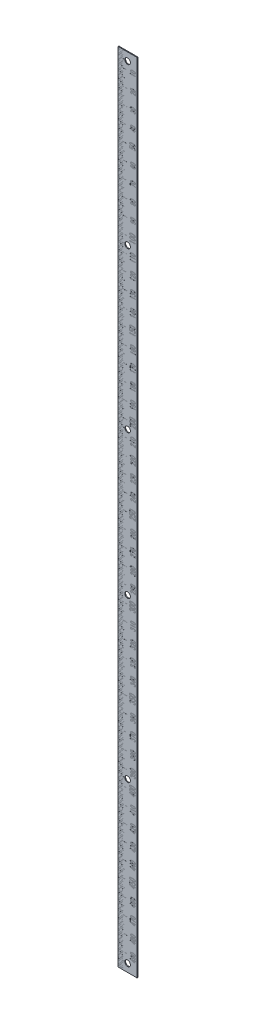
SolidWorks part; units mm, degrees
ref_plane "Front" through (0, 0, 0) normal (0, 0, 1) x (1, 0, 0)
ref_plane "Top" through (0, 0, 0) normal (0, 1, 0) x (1, 0, 0)
ref_plane "Right" through (0, 0, 0) normal (1, 0, 0) x (0, 0, -1)
sketch "Sketch1" plane through (0, 0, 0) normal (0, 0, 1) x (1, 0, 0)
  line L1 (0, 0) -> (0, 500)
  line L2 (0, 0) -> (12, 0)
  line L3 (12, 0) -> (12, 500)
  line L4 (0, 500) -> (12, 500)
  dimension "D1" = 500
  dimension "D2" = 12
extrude "Extrude1" add sketch "Sketch1" along normal blind 0.5
sketch "Sketch2" plane through (0, 0, 0.5) normal (0, 0, 1) x (1, 0, 0)
  line L0 (0, 500) -> (0, 0) construction
  line L1 (0, 0) -> (12, 0) construction
  line L2 (12, 500) -> (0, 500) construction
  circle A0 centre (6, 5) radius 1.75
  circle A1 centre (6, 495) radius 1.75
  circle A2 centre (6, 395) radius 1.75
  circle A3 centre (6, 295) radius 1.75
  circle A4 centre (6, 105) radius 1.75
  circle A5 centre (6, 205) radius 1.75
  dimension "D1" = 6
  dimension "D2" = 6
  dimension "D3" = 5
  dimension "D4" = 5
  dimension "D5" = 3.5
  dimension "D6" = 3.5
  dimension "D7" = 100
  dimension "D9" = 100
  dimension "D10" = 100
  dimension "D11" = 100
  dimension "D8" = 2
extrude "Extrude2" cut sketch "Sketch2" against normal through all
sketch "Sketch3" plane through (0, 0, 0.5) normal (0, 0, 1) x (1, 0, 0)
  line L0 (12, 500) -> (0, 500) construction
  line L1 (7.5, 488.25) -> (11, 488.25) construction
  line L2 (7.5, 488.25) -> (7.5, 491.75) construction
  line L3 (7.5, 491.75) -> (11, 491.75) construction
  line L4 (11, 488.25) -> (11, 491.75) construction
  line L5 (13.435, 410) -> (-8.3815, 410) construction
  line L6 (11, 478.25) -> (11, 481.75) construction
  line L7 (11, 468.25) -> (11, 471.75) construction
  line L8 (11, 458.25) -> (11, 461.75) construction
  line L9 (11, 448.25) -> (11, 451.75) construction
  line L10 (11, 438.25) -> (11, 441.75) construction
  line L11 (11, 428.25) -> (11, 431.75) construction
  line L12 (11, 418.25) -> (11, 421.75) construction
  line L13 (11, 408.25) -> (11, 411.75) construction
  line L14 (11, 47.2) -> (11, 52.8) construction
  line L15 (11, 37.2) -> (11, 42.8) construction
  line L16 (11, 398.25) -> (11, 401.75) construction
  line L17 (11, 50) -> (-4.9003, 50) construction
  line L18 (11, 27.2) -> (11, 32.8) construction
  line L19 (11, 17.2) -> (11, 22.8) construction
  line L20 (11, 7.2) -> (11, 12.8) construction
  line L21 (11, 97.2) -> (11, 102.8) construction
  line L22 (12, 0) -> (12, 500) construction
  line L23 (11, 87.2) -> (11, 92.8) construction
  line L24 (11, 57.2) -> (11, 62.8) construction
  line L25 (11, 67.2) -> (11, 72.8) construction
  line L26 (11, 77.2) -> (11, 82.8) construction
  line L27 (13.435, 400) -> (-8.3815, 400) construction
  line L28 (13.435, 390) -> (-8.3815, 390) construction
  line L29 (13.435, 380) -> (-8.3815, 380) construction
  line L30 (13.435, 370) -> (-8.3815, 370) construction
  line L31 (13.435, 360) -> (-8.3815, 360) construction
  line L32 (13.435, 350) -> (-8.3815, 350) construction
  line L33 (13.435, 340) -> (-8.3815, 340) construction
  line L34 (13.435, 330) -> (-8.3815, 330) construction
  line L35 (13.435, 320) -> (-8.3815, 320) construction
  line L36 (13.435, 310) -> (-8.3815, 310) construction
  line L37 (13.435, 300) -> (-8.3815, 300) construction
  line L38 (13.435, 290) -> (-8.3815, 290) construction
  line L39 (13.435, 280) -> (-8.3815, 280) construction
  line L40 (13.435, 270) -> (-8.3815, 270) construction
  line L41 (13.435, 260) -> (-8.3815, 260) construction
  line L42 (13.435, 250) -> (-8.3815, 250) construction
  line L43 (13.435, 240) -> (-8.3815, 240) construction
  line L44 (13.435, 230) -> (-8.3815, 230) construction
  line L45 (13.435, 220) -> (-8.3815, 220) construction
  line L46 (13.435, 210) -> (-8.3815, 210) construction
  line L47 (13.435, 200) -> (-8.3815, 200) construction
  line L48 (13.435, 190) -> (-8.3815, 190) construction
  line L49 (13.435, 180) -> (-8.3815, 180) construction
  line L50 (13.435, 170) -> (-8.3815, 170) construction
  line L51 (13.435, 160) -> (-8.3815, 160) construction
  line L52 (13.435, 150) -> (-8.3815, 150) construction
  line L53 (13.435, 140) -> (-8.3815, 140) construction
  line L54 (13.435, 130) -> (-8.3815, 130) construction
  line L55 (13.435, 120) -> (-8.3815, 120) construction
  line L56 (13.435, 110) -> (-8.3815, 110) construction
  line L57 (13.435, 100) -> (-8.3815, 100) construction
  line L58 (13.435, 90) -> (-8.3815, 90) construction
  line L59 (13.435, 80) -> (-8.3815, 80) construction
  line L60 (13.435, 70) -> (-8.3815, 70) construction
  line L61 (13.435, 60) -> (-8.3815, 60) construction
  line L62 (13.435, 50) -> (-8.3815, 50) construction
  line L63 (13.435, 40) -> (-8.3815, 40) construction
  line L64 (13.435, 30) -> (-8.3815, 30) construction
  line L65 (13.435, 20) -> (-8.3815, 20) construction
  line L66 (13.435, 10) -> (-8.3815, 10) construction
  line L67 (11, 347.2) -> (11, 352.8) construction
  line L68 (11, 317.2) -> (11, 322.8) construction
  line L69 (11, 387.2) -> (11, 392.8) construction
  line L70 (11, 327.2) -> (11, 332.8) construction
  line L71 (11, 337.2) -> (11, 342.8) construction
  line L72 (11, 397.2) -> (11, 402.8) construction
  line L73 (11, 367.2) -> (11, 372.8) construction
  line L74 (11, 307.2) -> (11, 312.8) construction
  line L75 (11, 357.2) -> (11, 362.8) construction
  line L76 (11, 377.2) -> (11, 382.8) construction
  line L77 (11, 277.2) -> (11, 282.8) construction
  line L78 (11, 227.2) -> (11, 232.8) construction
  line L79 (11, 237.2) -> (11, 242.8) construction
  line L80 (11, 257.2) -> (11, 262.8) construction
  line L81 (11, 267.2) -> (11, 272.8) construction
  line L82 (11, 297.2) -> (11, 302.8) construction
  line L83 (11, 207.2) -> (11, 212.8) construction
  line L84 (11, 217.2) -> (11, 222.8) construction
  line L85 (11, 247.2) -> (11, 252.8) construction
  line L86 (11, 287.2) -> (11, 292.8) construction
  line L87 (11, 137.2) -> (11, 142.8) construction
  line L88 (11, 117.2) -> (11, 122.8) construction
  line L89 (11, 147.2) -> (11, 152.8) construction
  line L90 (11, 187.2) -> (11, 192.8) construction
  line L91 (11, 107.2) -> (11, 112.8) construction
  line L92 (11, 127.2) -> (11, 132.8) construction
  line L93 (11, 177.2) -> (11, 182.8) construction
  line L94 (11, 167.2) -> (11, 172.8) construction
  line L95 (11, 197.2) -> (11, 202.8) construction
  line L96 (11, 157.2) -> (11, 162.8) construction
  text T0 "10" font "ＭＳ ゴシック" height in points 11
  text T1 "20" font "ＭＳ ゴシック" height in points 11
  text T2 "30" font "ＭＳ ゴシック" height in points 11
  text T3 "40" font "ＭＳ ゴシック" height in points 11
  text T4 "50" font "ＭＳ ゴシック" height in points 13
  text T5 "60  " font "ＭＳ ゴシック" height in points 11
  text T6 "70" font "ＭＳ ゴシック" height in points 11
  text T7 "80" font "ＭＳ ゴシック" height in points 11
  text T8 "90" font "ＭＳ ゴシック" height in points 11
  text T9 "450" font "ＭＳ ゴシック" height in points 13
  text T10 "460" font "ＭＳ ゴシック" height in points 11
  text T11 "470" font "ＭＳ ゴシック" height in points 11
  text T12 "480" font "ＭＳ ゴシック" height in points 11
  text T13 "490" font "ＭＳ ゴシック" height in points 11
  text T14 "400" font "ＭＳ ゴシック" height in points 13
  text T15 "410" font "ＭＳ ゴシック" height in points 11
  text T16 "420  " font "ＭＳ ゴシック" height in points 11
  text T17 "430  " font "ＭＳ ゴシック" height in points 11
  text T18 "440" font "ＭＳ ゴシック" height in points 11
  text T19 "100" font "ＭＳ ゴシック" height in points 13
  text T20 "110" font "ＭＳ ゴシック" height in points 11
  text T21 "120" font "ＭＳ ゴシック" height in points 11
  text T22 "130" font "ＭＳ ゴシック" height in points 11
  text T23 "140" font "ＭＳ ゴシック" height in points 11
  text T24 "150" font "ＭＳ ゴシック" height in points 13
  text T25 "160" font "ＭＳ ゴシック" height in points 11
  text T26 "170" font "ＭＳ ゴシック" height in points 11
  text T27 "180" font "ＭＳ ゴシック" height in points 11
  text T28 "190" font "ＭＳ ゴシック" height in points 11
  text T29 "200" font "ＭＳ ゴシック" height in points 13
  text T30 "210" font "ＭＳ ゴシック" height in points 11
  text T31 "220" font "ＭＳ ゴシック" height in points 11
  text T32 "230" font "ＭＳ ゴシック" height in points 11
  text T33 "240" font "ＭＳ ゴシック" height in points 11
  text T34 "250" font "ＭＳ ゴシック" height in points 13
  text T35 "260" font "ＭＳ ゴシック" height in points 11
  text T36 "270" font "ＭＳ ゴシック" height in points 11
  text T37 "280" font "ＭＳ ゴシック" height in points 11
  text T38 "290" font "ＭＳ ゴシック" height in points 11
  text T39 "300" font "ＭＳ ゴシック" height in points 13
  text T40 "310" font "ＭＳ ゴシック" height in points 11
  text T41 "320" font "ＭＳ ゴシック" height in points 11
  text T42 "330" font "ＭＳ ゴシック" height in points 11
  text T43 "340" font "ＭＳ ゴシック" height in points 11
  text T44 "350" font "ＭＳ ゴシック" height in points 13
  text T45 "360" font "ＭＳ ゴシック" height in points 11
  text T46 "370" font "ＭＳ ゴシック" height in points 11
  text T47 "380" font "ＭＳ ゴシック" height in points 11
  text T48 "390" font "ＭＳ ゴシック" height in points 11
  point P4 (11, 490)
  dimension "D1" = 3.5
  dimension "D2" = 10
  dimension "D3" = 1
  dimension "D4" = 3.5
  dimension "D8" = 5.6
  dimension "D10" = 2.8
  dimension "D5" = 4
  dimension "D6" = 7
  dimension "D7" = 5
  dimension "D9" = 2
  dimension "D11" = 2
extrude "Extrude5" cut sketch "Sketch3" against normal blind 0.01
sketch "Sketch4" plane through (0, 0, 0.5) normal (0, 0, 1) x (1, 0, 0)
  line L0 (3, 187.05) -> (3, 186.95)
  line L1 (0, 186.95) -> (3, 186.95)
  line L2 (0, 187.05) -> (3, 187.05)
  line L3 (0, 187.05) -> (0, 186.95)
  line L4 (3, 188.05) -> (3, 187.95)
  line L5 (12, 500) -> (0, 500) construction
  line L6 (0, 187.95) -> (3, 187.95)
  line L7 (0, 188.05) -> (3, 188.05)
  line L8 (3, 189.05) -> (3, 188.95)
  line L9 (0, 188.95) -> (3, 188.95)
  line L10 (0, 189.05) -> (0, 188.95)
  line L11 (0, 189.05) -> (3, 189.05)
  line L12 (0, 188.05) -> (0, 187.95)
  line L13 (0, 189.95) -> (0, 190.05)
  line L14 (5.5, 189.95) -> (0, 189.95)
  line L15 (5.5, 190.05) -> (5.5, 189.95)
  line L16 (0, 190.05) -> (5.5, 190.05)
  line L17 (3, 191.05) -> (3, 190.95)
  line L18 (0, 190.95) -> (3, 190.95)
  line L19 (0, 191.05) -> (3, 191.05)
  line L20 (0, 191.05) -> (0, 190.95)
  line L21 (3, 192.05) -> (3, 191.95)
  line L22 (0, 191.95) -> (3, 191.95)
  line L23 (0, 192.05) -> (3, 192.05)
  line L24 (0, 192.05) -> (0, 191.95)
  line L25 (3, 193.05) -> (3, 192.95)
  line L26 (0, 192.95) -> (3, 192.95)
  line L27 (0, 193.05) -> (3, 193.05)
  line L28 (0, 193.05) -> (0, 192.95)
  line L29 (3, 194.05) -> (3, 193.95)
  line L30 (0, 193.95) -> (3, 193.95)
  line L31 (0, 194.05) -> (3, 194.05)
  line L32 (0, 194.05) -> (0, 193.95)
  line L33 (3, 196.05) -> (3, 195.95)
  line L34 (0, 195.95) -> (3, 195.95)
  line L35 (0, 196.05) -> (3, 196.05)
  line L36 (0, 196.05) -> (0, 195.95)
  line L37 (3, 197.05) -> (3, 196.95)
  line L38 (0, 196.95) -> (3, 196.95)
  line L39 (0, 197.05) -> (3, 197.05)
  line L40 (0, 197.05) -> (0, 196.95)
  line L41 (3, 198.05) -> (3, 197.95)
  line L42 (0, 197.95) -> (3, 197.95)
  line L43 (0, 198.05) -> (3, 198.05)
  line L44 (3, 199.05) -> (3, 198.95)
  line L45 (0, 198.95) -> (3, 198.95)
  line L46 (0, 199.05) -> (0, 198.95)
  line L47 (0, 199.05) -> (3, 199.05)
  line L48 (4, 194.95) -> (4, 195.05)
  line L49 (0, 195.05) -> (4, 195.05)
  line L50 (0, 194.95) -> (0, 195.05)
  line L51 (0, 194.95) -> (4, 194.95)
  line L52 (0, 198.05) -> (0, 197.95)
  line L53 (0, 199.95) -> (0, 200.05)
  line L54 (5.5, 199.95) -> (0, 199.95)
  line L55 (5.5, 200.05) -> (5.5, 199.95)
  line L56 (0, 200.05) -> (5.5, 200.05)
  line L57 (3, 201.05) -> (3, 200.95)
  line L58 (0, 200.95) -> (3, 200.95)
  line L59 (0, 201.05) -> (3, 201.05)
  line L60 (0, 201.05) -> (0, 200.95)
  line L61 (3, 202.05) -> (3, 201.95)
  line L62 (0, 201.95) -> (3, 201.95)
  line L63 (0, 202.05) -> (3, 202.05)
  line L64 (0, 202.05) -> (0, 201.95)
  line L65 (3, 203.05) -> (3, 202.95)
  line L66 (0, 202.95) -> (3, 202.95)
  line L67 (0, 203.05) -> (3, 203.05)
  line L68 (0, 203.05) -> (0, 202.95)
  line L69 (3, 204.05) -> (3, 203.95)
  line L70 (0, 203.95) -> (3, 203.95)
  line L71 (0, 204.05) -> (3, 204.05)
  line L72 (0, 204.05) -> (0, 203.95)
  line L73 (3, 206.05) -> (3, 205.95)
  line L74 (0, 205.95) -> (3, 205.95)
  line L75 (0, 206.05) -> (3, 206.05)
  line L76 (0, 206.05) -> (0, 205.95)
  line L77 (3, 207.05) -> (3, 206.95)
  line L78 (0, 206.95) -> (3, 206.95)
  line L79 (0, 207.05) -> (3, 207.05)
  line L80 (0, 207.05) -> (0, 206.95)
  line L81 (3, 208.05) -> (3, 207.95)
  line L82 (0, 207.95) -> (3, 207.95)
  line L83 (0, 208.05) -> (3, 208.05)
  line L84 (3, 209.05) -> (3, 208.95)
  line L85 (0, 208.95) -> (3, 208.95)
  line L86 (0, 209.05) -> (0, 208.95)
  line L87 (0, 209.05) -> (3, 209.05)
  line L88 (4, 204.95) -> (4, 205.05)
  line L89 (0, 205.05) -> (4, 205.05)
  line L90 (0, 204.95) -> (0, 205.05)
  line L91 (0, 204.95) -> (4, 204.95)
  line L92 (0, 208.05) -> (0, 207.95)
  line L93 (0, 209.95) -> (0, 210.05)
  line L94 (5.5, 209.95) -> (0, 209.95)
  line L95 (5.5, 210.05) -> (5.5, 209.95)
  line L96 (0, 210.05) -> (5.5, 210.05)
  line L97 (3, 211.05) -> (3, 210.95)
  line L98 (0, 210.95) -> (3, 210.95)
  line L99 (0, 211.05) -> (3, 211.05)
  line L100 (0, 211.05) -> (0, 210.95)
  line L101 (3, 212.05) -> (3, 211.95)
  line L102 (0, 211.95) -> (3, 211.95)
  line L103 (0, 212.05) -> (3, 212.05)
  line L104 (0, 212.05) -> (0, 211.95)
  line L105 (3, 213.05) -> (3, 212.95)
  line L106 (0, 212.95) -> (3, 212.95)
  line L107 (0, 213.05) -> (3, 213.05)
  line L108 (0, 213.05) -> (0, 212.95)
  line L109 (3, 214.05) -> (3, 213.95)
  line L110 (0, 213.95) -> (3, 213.95)
  line L111 (0, 214.05) -> (3, 214.05)
  line L112 (0, 214.05) -> (0, 213.95)
  line L113 (3, 216.05) -> (3, 215.95)
  line L114 (0, 215.95) -> (3, 215.95)
  line L115 (0, 216.05) -> (3, 216.05)
  line L116 (0, 216.05) -> (0, 215.95)
  line L117 (3, 217.05) -> (3, 216.95)
  line L118 (0, 216.95) -> (3, 216.95)
  line L119 (0, 217.05) -> (3, 217.05)
  line L120 (0, 217.05) -> (0, 216.95)
  line L121 (3, 218.05) -> (3, 217.95)
  line L122 (0, 217.95) -> (3, 217.95)
  line L123 (0, 218.05) -> (3, 218.05)
  line L124 (3, 219.05) -> (3, 218.95)
  line L125 (0, 218.95) -> (3, 218.95)
  line L126 (0, 219.05) -> (0, 218.95)
  line L127 (0, 219.05) -> (3, 219.05)
  line L128 (4, 214.95) -> (4, 215.05)
  line L129 (0, 215.05) -> (4, 215.05)
  line L130 (0, 214.95) -> (0, 215.05)
  line L131 (0, 214.95) -> (4, 214.95)
  line L132 (0, 218.05) -> (0, 217.95)
  line L133 (0, 219.95) -> (0, 220.05)
  line L134 (5.5, 219.95) -> (0, 219.95)
  line L135 (5.5, 220.05) -> (5.5, 219.95)
  line L136 (0, 220.05) -> (5.5, 220.05)
  line L137 (3, 221.05) -> (3, 220.95)
  line L138 (0, 220.95) -> (3, 220.95)
  line L139 (0, 221.05) -> (3, 221.05)
  line L140 (0, 221.05) -> (0, 220.95)
  line L141 (3, 222.05) -> (3, 221.95)
  line L142 (0, 221.95) -> (3, 221.95)
  line L143 (0, 222.05) -> (3, 222.05)
  line L144 (0, 222.05) -> (0, 221.95)
  line L145 (3, 223.05) -> (3, 222.95)
  line L146 (0, 222.95) -> (3, 222.95)
  line L147 (0, 223.05) -> (3, 223.05)
  line L148 (0, 223.05) -> (0, 222.95)
  line L149 (3, 224.05) -> (3, 223.95)
  line L150 (0, 223.95) -> (3, 223.95)
  line L151 (0, 224.05) -> (3, 224.05)
  line L152 (0, 224.05) -> (0, 223.95)
  line L153 (3, 226.05) -> (3, 225.95)
  line L154 (0, 225.95) -> (3, 225.95)
  line L155 (0, 226.05) -> (3, 226.05)
  line L156 (0, 226.05) -> (0, 225.95)
  line L157 (3, 227.05) -> (3, 226.95)
  line L158 (0, 226.95) -> (3, 226.95)
  line L159 (0, 227.05) -> (3, 227.05)
  line L160 (0, 227.05) -> (0, 226.95)
  line L161 (3, 228.05) -> (3, 227.95)
  line L162 (0, 227.95) -> (3, 227.95)
  line L163 (0, 228.05) -> (3, 228.05)
  line L164 (3, 229.05) -> (3, 228.95)
  line L165 (0, 228.95) -> (3, 228.95)
  line L166 (0, 229.05) -> (0, 228.95)
  line L167 (0, 229.05) -> (3, 229.05)
  line L168 (4, 224.95) -> (4, 225.05)
  line L169 (0, 225.05) -> (4, 225.05)
  line L170 (0, 224.95) -> (0, 225.05)
  line L171 (0, 224.95) -> (4, 224.95)
  line L172 (0, 228.05) -> (0, 227.95)
  line L173 (0, 229.95) -> (0, 230.05)
  line L174 (5.5, 229.95) -> (0, 229.95)
  line L175 (5.5, 230.05) -> (5.5, 229.95)
  line L176 (0, 230.05) -> (5.5, 230.05)
  line L177 (3, 231.05) -> (3, 230.95)
  line L178 (0, 230.95) -> (3, 230.95)
  line L179 (0, 231.05) -> (3, 231.05)
  line L180 (0, 231.05) -> (0, 230.95)
  line L181 (3, 232.05) -> (3, 231.95)
  line L182 (0, 231.95) -> (3, 231.95)
  line L183 (0, 232.05) -> (3, 232.05)
  line L184 (0, 232.05) -> (0, 231.95)
  line L185 (3, 233.05) -> (3, 232.95)
  line L186 (0, 232.95) -> (3, 232.95)
  line L187 (0, 233.05) -> (3, 233.05)
  line L188 (0, 233.05) -> (0, 232.95)
  line L189 (3, 234.05) -> (3, 233.95)
  line L190 (0, 233.95) -> (3, 233.95)
  line L191 (0, 234.05) -> (3, 234.05)
  line L192 (0, 234.05) -> (0, 233.95)
  line L193 (3, 236.05) -> (3, 235.95)
  line L194 (0, 235.95) -> (3, 235.95)
  line L195 (0, 236.05) -> (3, 236.05)
  line L196 (0, 236.05) -> (0, 235.95)
  line L197 (3, 237.05) -> (3, 236.95)
  line L198 (0, 236.95) -> (3, 236.95)
  line L199 (0, 237.05) -> (3, 237.05)
  line L200 (0, 237.05) -> (0, 236.95)
  line L201 (3, 238.05) -> (3, 237.95)
  line L202 (0, 237.95) -> (3, 237.95)
  line L203 (0, 238.05) -> (3, 238.05)
  line L204 (3, 239.05) -> (3, 238.95)
  line L205 (0, 238.95) -> (3, 238.95)
  line L206 (0, 239.05) -> (0, 238.95)
  line L207 (0, 239.05) -> (3, 239.05)
  line L208 (4, 234.95) -> (4, 235.05)
  line L209 (0, 235.05) -> (4, 235.05)
  line L210 (0, 234.95) -> (0, 235.05)
  line L211 (0, 234.95) -> (4, 234.95)
  line L212 (0, 238.05) -> (0, 237.95)
  line L213 (0, 239.95) -> (0, 240.05)
  line L214 (5.5, 239.95) -> (0, 239.95)
  line L215 (5.5, 240.05) -> (5.5, 239.95)
  line L216 (0, 240.05) -> (5.5, 240.05)
  line L217 (3, 241.05) -> (3, 240.95)
  line L218 (0, 240.95) -> (3, 240.95)
  line L219 (0, 241.05) -> (3, 241.05)
  line L220 (0, 241.05) -> (0, 240.95)
  line L221 (3, 242.05) -> (3, 241.95)
  line L222 (0, 241.95) -> (3, 241.95)
  line L223 (0, 242.05) -> (3, 242.05)
  line L224 (0, 242.05) -> (0, 241.95)
  line L225 (3, 243.05) -> (3, 242.95)
  line L226 (0, 242.95) -> (3, 242.95)
  line L227 (0, 243.05) -> (3, 243.05)
  line L228 (0, 243.05) -> (0, 242.95)
  line L229 (3, 244.05) -> (3, 243.95)
  line L230 (0, 243.95) -> (3, 243.95)
  line L231 (0, 244.05) -> (3, 244.05)
  line L232 (0, 244.05) -> (0, 243.95)
  line L233 (3, 246.05) -> (3, 245.95)
  line L234 (0, 245.95) -> (3, 245.95)
  line L235 (0, 246.05) -> (3, 246.05)
  line L236 (0, 246.05) -> (0, 245.95)
  line L237 (3, 247.05) -> (3, 246.95)
  line L238 (0, 246.95) -> (3, 246.95)
  line L239 (0, 247.05) -> (3, 247.05)
  line L240 (0, 247.05) -> (0, 246.95)
  line L241 (3, 248.05) -> (3, 247.95)
  line L242 (0, 247.95) -> (3, 247.95)
  line L243 (0, 248.05) -> (3, 248.05)
  line L244 (3, 249.05) -> (3, 248.95)
  line L245 (0, 248.95) -> (3, 248.95)
  line L246 (0, 249.05) -> (0, 248.95)
  line L247 (0, 249.05) -> (3, 249.05)
  line L248 (4, 244.95) -> (4, 245.05)
  line L249 (0, 245.05) -> (4, 245.05)
  line L250 (0, 244.95) -> (0, 245.05)
  line L251 (0, 244.95) -> (4, 244.95)
  line L252 (0, 248.05) -> (0, 247.95)
  line L253 (3, 251.05) -> (3, 250.95)
  line L254 (0, 250.95) -> (3, 250.95)
  line L255 (0, 251.05) -> (3, 251.05)
  line L256 (0, 251.05) -> (0, 250.95)
  line L257 (3, 252.05) -> (3, 251.95)
  line L258 (0, 251.95) -> (3, 251.95)
  line L259 (0, 252.05) -> (3, 252.05)
  line L260 (0, 252.05) -> (0, 251.95)
  line L261 (3, 253.05) -> (3, 252.95)
  line L262 (0, 252.95) -> (3, 252.95)
  line L263 (0, 253.05) -> (3, 253.05)
  line L264 (0, 253.05) -> (0, 252.95)
  line L265 (3, 254.05) -> (3, 253.95)
  line L266 (0, 253.95) -> (3, 253.95)
  line L267 (0, 254.05) -> (3, 254.05)
  line L268 (0, 254.05) -> (0, 253.95)
  line L269 (3, 256.05) -> (3, 255.95)
  line L270 (0, 255.95) -> (3, 255.95)
  line L271 (0, 256.05) -> (3, 256.05)
  line L272 (0, 256.05) -> (0, 255.95)
  line L273 (3, 257.05) -> (3, 256.95)
  line L274 (0, 256.95) -> (3, 256.95)
  line L275 (0, 257.05) -> (3, 257.05)
  line L276 (0, 257.05) -> (0, 256.95)
  line L277 (3, 258.05) -> (3, 257.95)
  line L278 (0, 257.95) -> (3, 257.95)
  line L279 (0, 258.05) -> (3, 258.05)
  line L280 (3, 259.05) -> (3, 258.95)
  line L281 (0, 258.95) -> (3, 258.95)
  line L282 (0, 259.05) -> (0, 258.95)
  line L283 (0, 259.05) -> (3, 259.05)
  line L284 (4, 254.95) -> (4, 255.05)
  line L285 (0, 255.05) -> (4, 255.05)
  line L286 (0, 254.95) -> (0, 255.05)
  line L287 (0, 254.95) -> (4, 254.95)
  line L288 (0, 258.05) -> (0, 257.95)
  line L289 (0, 249.95) -> (0, 250.05)
  line L290 (5.5, 249.95) -> (0, 249.95)
  line L291 (5.5, 250.05) -> (5.5, 249.95)
  line L292 (0, 250.05) -> (5.5, 250.05)
  line L293 (3, 261.05) -> (3, 260.95)
  line L294 (0, 260.95) -> (3, 260.95)
  line L295 (0, 261.05) -> (3, 261.05)
  line L296 (0, 261.05) -> (0, 260.95)
  line L297 (3, 262.05) -> (3, 261.95)
  line L298 (0, 261.95) -> (3, 261.95)
  line L299 (0, 262.05) -> (3, 262.05)
  line L300 (0, 262.05) -> (0, 261.95)
  line L301 (3, 263.05) -> (3, 262.95)
  line L302 (0, 262.95) -> (3, 262.95)
  line L303 (0, 263.05) -> (3, 263.05)
  line L304 (0, 263.05) -> (0, 262.95)
  line L305 (3, 264.05) -> (3, 263.95)
  line L306 (0, 263.95) -> (3, 263.95)
  line L307 (0, 264.05) -> (3, 264.05)
  line L308 (0, 264.05) -> (0, 263.95)
  line L309 (3, 266.05) -> (3, 265.95)
  line L310 (0, 265.95) -> (3, 265.95)
  line L311 (0, 266.05) -> (3, 266.05)
  line L312 (0, 266.05) -> (0, 265.95)
  line L313 (3, 267.05) -> (3, 266.95)
  line L314 (0, 266.95) -> (3, 266.95)
  line L315 (0, 267.05) -> (3, 267.05)
  line L316 (0, 267.05) -> (0, 266.95)
  line L317 (3, 268.05) -> (3, 267.95)
  line L318 (0, 267.95) -> (3, 267.95)
  line L319 (0, 268.05) -> (3, 268.05)
  line L320 (3, 269.05) -> (3, 268.95)
  line L321 (0, 268.95) -> (3, 268.95)
  line L322 (0, 269.05) -> (0, 268.95)
  line L323 (0, 269.05) -> (3, 269.05)
  line L324 (4, 264.95) -> (4, 265.05)
  line L325 (0, 265.05) -> (4, 265.05)
  line L326 (0, 264.95) -> (0, 265.05)
  line L327 (0, 264.95) -> (4, 264.95)
  line L328 (0, 268.05) -> (0, 267.95)
  line L329 (0, 259.95) -> (0, 260.05)
  line L330 (5.5, 259.95) -> (0, 259.95)
  line L331 (5.5, 260.05) -> (5.5, 259.95)
  line L332 (0, 260.05) -> (5.5, 260.05)
  line L333 (3, 271.05) -> (3, 270.95)
  line L334 (0, 270.95) -> (3, 270.95)
  line L335 (0, 271.05) -> (3, 271.05)
  line L336 (0, 271.05) -> (0, 270.95)
  line L337 (3, 272.05) -> (3, 271.95)
  line L338 (0, 271.95) -> (3, 271.95)
  line L339 (0, 272.05) -> (3, 272.05)
  line L340 (0, 272.05) -> (0, 271.95)
  line L341 (3, 273.05) -> (3, 272.95)
  line L342 (0, 272.95) -> (3, 272.95)
  line L343 (0, 273.05) -> (3, 273.05)
  line L344 (0, 273.05) -> (0, 272.95)
  line L345 (3, 274.05) -> (3, 273.95)
  line L346 (0, 273.95) -> (3, 273.95)
  line L347 (0, 274.05) -> (3, 274.05)
  line L348 (0, 274.05) -> (0, 273.95)
  line L349 (3, 276.05) -> (3, 275.95)
  line L350 (0, 275.95) -> (3, 275.95)
  line L351 (0, 276.05) -> (3, 276.05)
  line L352 (0, 276.05) -> (0, 275.95)
  line L353 (3, 277.05) -> (3, 276.95)
  line L354 (0, 276.95) -> (3, 276.95)
  line L355 (0, 277.05) -> (3, 277.05)
  line L356 (0, 277.05) -> (0, 276.95)
  line L357 (3, 278.05) -> (3, 277.95)
  line L358 (0, 277.95) -> (3, 277.95)
  line L359 (0, 278.05) -> (3, 278.05)
  line L360 (3, 279.05) -> (3, 278.95)
  line L361 (0, 278.95) -> (3, 278.95)
  line L362 (0, 279.05) -> (0, 278.95)
  line L363 (0, 279.05) -> (3, 279.05)
  line L364 (4, 274.95) -> (4, 275.05)
  line L365 (0, 275.05) -> (4, 275.05)
  line L366 (0, 274.95) -> (0, 275.05)
  line L367 (0, 274.95) -> (4, 274.95)
  line L368 (0, 278.05) -> (0, 277.95)
  line L369 (0, 269.95) -> (0, 270.05)
  line L370 (5.5, 269.95) -> (0, 269.95)
  line L371 (5.5, 270.05) -> (5.5, 269.95)
  line L372 (0, 270.05) -> (5.5, 270.05)
  line L373 (3, 281.05) -> (3, 280.95)
  line L374 (0, 280.95) -> (3, 280.95)
  line L375 (0, 281.05) -> (3, 281.05)
  line L376 (0, 281.05) -> (0, 280.95)
  line L377 (3, 282.05) -> (3, 281.95)
  line L378 (0, 281.95) -> (3, 281.95)
  line L379 (0, 282.05) -> (3, 282.05)
  line L380 (0, 282.05) -> (0, 281.95)
  line L381 (0, 283.05) -> (0, 282.95)
  line L382 (0, 284.05) -> (0, 283.95)
  line L383 (0, 284.95) -> (0, 285.05)
  line L384 (0, 279.95) -> (0, 280.05)
  line L385 (5.5, 279.95) -> (0, 279.95)
  line L386 (5.5, 280.05) -> (5.5, 279.95)
  line L387 (0, 280.05) -> (5.5, 280.05)
  line L388 (3, 283.05) -> (3, 282.95)
  line L389 (0, 282.95) -> (3, 282.95)
  line L390 (0, 283.05) -> (3, 283.05)
  line L391 (3, 284.05) -> (3, 283.95)
  line L392 (0, 283.95) -> (3, 283.95)
  line L393 (0, 284.05) -> (3, 284.05)
  line L394 (3, 286.05) -> (3, 285.95)
  line L395 (0, 285.95) -> (3, 285.95)
  line L396 (0, 286.05) -> (3, 286.05)
  line L397 (0, 286.05) -> (0, 285.95)
  line L398 (3, 287.05) -> (3, 286.95)
  line L399 (0, 286.95) -> (3, 286.95)
  line L400 (0, 287.05) -> (3, 287.05)
  line L401 (0, 287.05) -> (0, 286.95)
  line L402 (3, 288.05) -> (3, 287.95)
  line L403 (0, 287.95) -> (3, 287.95)
  line L404 (0, 288.05) -> (3, 288.05)
  line L405 (3, 289.05) -> (3, 288.95)
  line L406 (0, 288.95) -> (3, 288.95)
  line L407 (0, 289.05) -> (0, 288.95)
  line L408 (0, 289.05) -> (3, 289.05)
  line L409 (4, 284.95) -> (4, 285.05)
  line L410 (0, 285.05) -> (4, 285.05)
  line L411 (0, 284.95) -> (4, 284.95)
  line L412 (0, 288.05) -> (0, 287.95)
  line L413 (3, 291.05) -> (3, 290.95)
  line L414 (0, 290.95) -> (3, 290.95)
  line L415 (0, 291.05) -> (3, 291.05)
  line L416 (0, 291.05) -> (0, 290.95)
  line L417 (3, 292.05) -> (3, 291.95)
  line L418 (0, 291.95) -> (3, 291.95)
  line L419 (0, 292.05) -> (3, 292.05)
  line L420 (0, 292.05) -> (0, 291.95)
  line L421 (3, 293.05) -> (3, 292.95)
  line L422 (0, 292.95) -> (3, 292.95)
  line L423 (0, 293.05) -> (3, 293.05)
  line L424 (0, 293.05) -> (0, 292.95)
  line L425 (3, 294.05) -> (3, 293.95)
  line L426 (0, 293.95) -> (3, 293.95)
  line L427 (0, 294.05) -> (3, 294.05)
  line L428 (0, 294.05) -> (0, 293.95)
  line L429 (3, 296.05) -> (3, 295.95)
  line L430 (0, 295.95) -> (3, 295.95)
  line L431 (0, 296.05) -> (3, 296.05)
  line L432 (0, 296.05) -> (0, 295.95)
  line L433 (3, 297.05) -> (3, 296.95)
  line L434 (0, 296.95) -> (3, 296.95)
  line L435 (0, 297.05) -> (3, 297.05)
  line L436 (0, 297.05) -> (0, 296.95)
  line L437 (3, 298.05) -> (3, 297.95)
  line L438 (0, 297.95) -> (3, 297.95)
  line L439 (0, 298.05) -> (3, 298.05)
  line L440 (3, 299.05) -> (3, 298.95)
  line L441 (0, 298.95) -> (3, 298.95)
  line L442 (0, 299.05) -> (0, 298.95)
  line L443 (0, 299.05) -> (3, 299.05)
  line L444 (4, 294.95) -> (4, 295.05)
  line L445 (0, 295.05) -> (4, 295.05)
  line L446 (0, 294.95) -> (0, 295.05)
  line L447 (0, 294.95) -> (4, 294.95)
  line L448 (0, 298.05) -> (0, 297.95)
  line L449 (0, 289.95) -> (0, 290.05)
  line L450 (5.5, 289.95) -> (0, 289.95)
  line L451 (5.5, 290.05) -> (5.5, 289.95)
  line L452 (0, 290.05) -> (5.5, 290.05)
  line L453 (3, 287.05) -> (3, 286.95)
  line L454 (0, 286.95) -> (3, 286.95)
  line L455 (0, 287.05) -> (3, 287.05)
  line L456 (0, 287.05) -> (0, 286.95)
  line L457 (3, 288.05) -> (3, 287.95)
  line L458 (0, 287.95) -> (3, 287.95)
  line L459 (0, 288.05) -> (3, 288.05)
  line L460 (3, 289.05) -> (3, 288.95)
  line L461 (0, 288.95) -> (3, 288.95)
  line L462 (0, 289.05) -> (0, 288.95)
  line L463 (0, 289.05) -> (3, 289.05)
  line L464 (0, 288.05) -> (0, 287.95)
  line L465 (0, 289.95) -> (0, 290.05)
  line L466 (5.5, 289.95) -> (0, 289.95)
  line L467 (5.5, 290.05) -> (5.5, 289.95)
  line L468 (0, 290.05) -> (5.5, 290.05)
  line L469 (3, 291.05) -> (3, 290.95)
  line L470 (0, 290.95) -> (3, 290.95)
  line L471 (0, 291.05) -> (3, 291.05)
  line L472 (0, 291.05) -> (0, 290.95)
  line L473 (3, 292.05) -> (3, 291.95)
  line L474 (0, 291.95) -> (3, 291.95)
  line L475 (0, 292.05) -> (3, 292.05)
  line L476 (0, 292.05) -> (0, 291.95)
  line L477 (3, 293.05) -> (3, 292.95)
  line L478 (0, 292.95) -> (3, 292.95)
  line L479 (0, 293.05) -> (3, 293.05)
  line L480 (0, 293.05) -> (0, 292.95)
  line L481 (3, 294.05) -> (3, 293.95)
  line L482 (0, 293.95) -> (3, 293.95)
  line L483 (0, 294.05) -> (3, 294.05)
  line L484 (0, 294.05) -> (0, 293.95)
  line L485 (3, 296.05) -> (3, 295.95)
  line L486 (0, 295.95) -> (3, 295.95)
  line L487 (0, 296.05) -> (3, 296.05)
  line L488 (0, 296.05) -> (0, 295.95)
  line L489 (3, 297.05) -> (3, 296.95)
  line L490 (0, 296.95) -> (3, 296.95)
  line L491 (0, 297.05) -> (3, 297.05)
  line L492 (0, 297.05) -> (0, 296.95)
  line L493 (3, 298.05) -> (3, 297.95)
  line L494 (0, 297.95) -> (3, 297.95)
  line L495 (0, 298.05) -> (3, 298.05)
  line L496 (3, 299.05) -> (3, 298.95)
  line L497 (0, 298.95) -> (3, 298.95)
  line L498 (0, 299.05) -> (0, 298.95)
  line L499 (0, 299.05) -> (3, 299.05)
  line L500 (4, 294.95) -> (4, 295.05)
  line L501 (0, 295.05) -> (4, 295.05)
  line L502 (0, 294.95) -> (0, 295.05)
  line L503 (0, 294.95) -> (4, 294.95)
  line L504 (0, 298.05) -> (0, 297.95)
  line L505 (0, 299.95) -> (0, 300.05)
  line L506 (5.5, 299.95) -> (0, 299.95)
  line L507 (5.5, 300.05) -> (5.5, 299.95)
  line L508 (0, 300.05) -> (5.5, 300.05)
  line L509 (3, 301.05) -> (3, 300.95)
  line L510 (0, 300.95) -> (3, 300.95)
  line L511 (0, 301.05) -> (3, 301.05)
  line L512 (0, 301.05) -> (0, 300.95)
  line L513 (3, 302.05) -> (3, 301.95)
  line L514 (0, 301.95) -> (3, 301.95)
  line L515 (0, 302.05) -> (3, 302.05)
  line L516 (0, 302.05) -> (0, 301.95)
  line L517 (3, 303.05) -> (3, 302.95)
  line L518 (0, 302.95) -> (3, 302.95)
  line L519 (0, 303.05) -> (3, 303.05)
  line L520 (0, 303.05) -> (0, 302.95)
  line L521 (3, 304.05) -> (3, 303.95)
  line L522 (0, 303.95) -> (3, 303.95)
  line L523 (0, 304.05) -> (3, 304.05)
  line L524 (0, 304.05) -> (0, 303.95)
  line L525 (3, 306.05) -> (3, 305.95)
  line L526 (0, 305.95) -> (3, 305.95)
  line L527 (0, 306.05) -> (3, 306.05)
  line L528 (0, 306.05) -> (0, 305.95)
  line L529 (3, 307.05) -> (3, 306.95)
  line L530 (0, 306.95) -> (3, 306.95)
  line L531 (0, 307.05) -> (3, 307.05)
  line L532 (0, 307.05) -> (0, 306.95)
  line L533 (3, 308.05) -> (3, 307.95)
  line L534 (0, 307.95) -> (3, 307.95)
  line L535 (0, 308.05) -> (3, 308.05)
  line L536 (3, 309.05) -> (3, 308.95)
  line L537 (0, 308.95) -> (3, 308.95)
  line L538 (0, 309.05) -> (0, 308.95)
  line L539 (0, 309.05) -> (3, 309.05)
  line L540 (4, 304.95) -> (4, 305.05)
  line L541 (0, 305.05) -> (4, 305.05)
  line L542 (0, 304.95) -> (0, 305.05)
  line L543 (0, 304.95) -> (4, 304.95)
  line L544 (0, 308.05) -> (0, 307.95)
  line L545 (0, 309.95) -> (0, 310.05)
  line L546 (5.5, 309.95) -> (0, 309.95)
  line L547 (5.5, 310.05) -> (5.5, 309.95)
  line L548 (0, 310.05) -> (5.5, 310.05)
  line L549 (3, 311.05) -> (3, 310.95)
  line L550 (0, 310.95) -> (3, 310.95)
  line L551 (0, 311.05) -> (3, 311.05)
  line L552 (0, 311.05) -> (0, 310.95)
  line L553 (3, 312.05) -> (3, 311.95)
  line L554 (0, 311.95) -> (3, 311.95)
  line L555 (0, 312.05) -> (3, 312.05)
  line L556 (0, 312.05) -> (0, 311.95)
  line L557 (3, 313.05) -> (3, 312.95)
  line L558 (0, 312.95) -> (3, 312.95)
  line L559 (0, 313.05) -> (3, 313.05)
  line L560 (0, 313.05) -> (0, 312.95)
  line L561 (3, 314.05) -> (3, 313.95)
  line L562 (0, 313.95) -> (3, 313.95)
  line L563 (0, 314.05) -> (3, 314.05)
  line L564 (0, 314.05) -> (0, 313.95)
  line L565 (3, 316.05) -> (3, 315.95)
  line L566 (0, 315.95) -> (3, 315.95)
  line L567 (0, 316.05) -> (3, 316.05)
  line L568 (0, 316.05) -> (0, 315.95)
  line L569 (3, 317.05) -> (3, 316.95)
  line L570 (0, 316.95) -> (3, 316.95)
  line L571 (0, 317.05) -> (3, 317.05)
  line L572 (0, 317.05) -> (0, 316.95)
  line L573 (3, 318.05) -> (3, 317.95)
  line L574 (0, 317.95) -> (3, 317.95)
  line L575 (0, 318.05) -> (3, 318.05)
  line L576 (3, 319.05) -> (3, 318.95)
  line L577 (0, 318.95) -> (3, 318.95)
  line L578 (0, 319.05) -> (0, 318.95)
  line L579 (0, 319.05) -> (3, 319.05)
  line L580 (4, 314.95) -> (4, 315.05)
  line L581 (0, 315.05) -> (4, 315.05)
  line L582 (0, 314.95) -> (0, 315.05)
  line L583 (0, 314.95) -> (4, 314.95)
  line L584 (0, 318.05) -> (0, 317.95)
  line L585 (0, 319.95) -> (0, 320.05)
  line L586 (5.5, 319.95) -> (0, 319.95)
  line L587 (5.5, 320.05) -> (5.5, 319.95)
  line L588 (0, 320.05) -> (5.5, 320.05)
  line L589 (3, 321.05) -> (3, 320.95)
  line L590 (0, 320.95) -> (3, 320.95)
  line L591 (0, 321.05) -> (3, 321.05)
  line L592 (0, 321.05) -> (0, 320.95)
  line L593 (3, 322.05) -> (3, 321.95)
  line L594 (0, 321.95) -> (3, 321.95)
  line L595 (0, 322.05) -> (3, 322.05)
  line L596 (0, 322.05) -> (0, 321.95)
  line L597 (3, 323.05) -> (3, 322.95)
  line L598 (0, 322.95) -> (3, 322.95)
  line L599 (0, 323.05) -> (3, 323.05)
  line L600 (0, 323.05) -> (0, 322.95)
  line L601 (3, 324.05) -> (3, 323.95)
  line L602 (0, 323.95) -> (3, 323.95)
  line L603 (0, 324.05) -> (3, 324.05)
  line L604 (0, 324.05) -> (0, 323.95)
  line L605 (3, 326.05) -> (3, 325.95)
  line L606 (0, 325.95) -> (3, 325.95)
  line L607 (0, 326.05) -> (3, 326.05)
  line L608 (0, 326.05) -> (0, 325.95)
  line L609 (3, 327.05) -> (3, 326.95)
  line L610 (0, 326.95) -> (3, 326.95)
  line L611 (0, 327.05) -> (3, 327.05)
  line L612 (0, 327.05) -> (0, 326.95)
  line L613 (3, 328.05) -> (3, 327.95)
  line L614 (0, 327.95) -> (3, 327.95)
  line L615 (0, 328.05) -> (3, 328.05)
  line L616 (3, 329.05) -> (3, 328.95)
  line L617 (0, 328.95) -> (3, 328.95)
  line L618 (0, 329.05) -> (0, 328.95)
  line L619 (0, 329.05) -> (3, 329.05)
  line L620 (4, 324.95) -> (4, 325.05)
  line L621 (0, 325.05) -> (4, 325.05)
  line L622 (0, 324.95) -> (0, 325.05)
  line L623 (0, 324.95) -> (4, 324.95)
  line L624 (0, 328.05) -> (0, 327.95)
  line L625 (0, 329.95) -> (0, 330.05)
  line L626 (5.5, 329.95) -> (0, 329.95)
  line L627 (5.5, 330.05) -> (5.5, 329.95)
  line L628 (0, 330.05) -> (5.5, 330.05)
  line L629 (3, 331.05) -> (3, 330.95)
  line L630 (0, 330.95) -> (3, 330.95)
  line L631 (0, 331.05) -> (3, 331.05)
  line L632 (0, 331.05) -> (0, 330.95)
  line L633 (3, 332.05) -> (3, 331.95)
  line L634 (0, 331.95) -> (3, 331.95)
  line L635 (0, 332.05) -> (3, 332.05)
  line L636 (0, 332.05) -> (0, 331.95)
  line L637 (3, 333.05) -> (3, 332.95)
  line L638 (0, 332.95) -> (3, 332.95)
  line L639 (0, 333.05) -> (3, 333.05)
  line L640 (0, 333.05) -> (0, 332.95)
  line L641 (3, 334.05) -> (3, 333.95)
  line L642 (0, 333.95) -> (3, 333.95)
  line L643 (0, 334.05) -> (3, 334.05)
  line L644 (0, 334.05) -> (0, 333.95)
  line L645 (3, 336.05) -> (3, 335.95)
  line L646 (0, 335.95) -> (3, 335.95)
  line L647 (0, 336.05) -> (3, 336.05)
  line L648 (0, 336.05) -> (0, 335.95)
  line L649 (3, 337.05) -> (3, 336.95)
  line L650 (0, 336.95) -> (3, 336.95)
  line L651 (0, 337.05) -> (3, 337.05)
  line L652 (0, 337.05) -> (0, 336.95)
  line L653 (3, 338.05) -> (3, 337.95)
  line L654 (0, 337.95) -> (3, 337.95)
  line L655 (0, 338.05) -> (3, 338.05)
  line L656 (3, 339.05) -> (3, 338.95)
  line L657 (0, 338.95) -> (3, 338.95)
  line L658 (0, 339.05) -> (0, 338.95)
  line L659 (0, 339.05) -> (3, 339.05)
  line L660 (4, 334.95) -> (4, 335.05)
  line L661 (0, 335.05) -> (4, 335.05)
  line L662 (0, 334.95) -> (0, 335.05)
  line L663 (0, 334.95) -> (4, 334.95)
  line L664 (0, 338.05) -> (0, 337.95)
  line L665 (0, 339.95) -> (0, 340.05)
  line L666 (5.5, 339.95) -> (0, 339.95)
  line L667 (5.5, 340.05) -> (5.5, 339.95)
  line L668 (0, 340.05) -> (5.5, 340.05)
  line L669 (3, 341.05) -> (3, 340.95)
  line L670 (0, 340.95) -> (3, 340.95)
  line L671 (0, 341.05) -> (3, 341.05)
  line L672 (0, 341.05) -> (0, 340.95)
  line L673 (3, 342.05) -> (3, 341.95)
  line L674 (0, 341.95) -> (3, 341.95)
  line L675 (0, 342.05) -> (3, 342.05)
  line L676 (0, 342.05) -> (0, 341.95)
  line L677 (3, 343.05) -> (3, 342.95)
  line L678 (0, 342.95) -> (3, 342.95)
  line L679 (0, 343.05) -> (3, 343.05)
  line L680 (0, 343.05) -> (0, 342.95)
  line L681 (3, 344.05) -> (3, 343.95)
  line L682 (0, 343.95) -> (3, 343.95)
  line L683 (0, 344.05) -> (3, 344.05)
  line L684 (0, 344.05) -> (0, 343.95)
  line L685 (3, 346.05) -> (3, 345.95)
  line L686 (0, 345.95) -> (3, 345.95)
  line L687 (0, 346.05) -> (3, 346.05)
  line L688 (0, 346.05) -> (0, 345.95)
  line L689 (3, 347.05) -> (3, 346.95)
  line L690 (0, 346.95) -> (3, 346.95)
  line L691 (0, 347.05) -> (3, 347.05)
  line L692 (0, 347.05) -> (0, 346.95)
  line L693 (3, 348.05) -> (3, 347.95)
  line L694 (0, 347.95) -> (3, 347.95)
  line L695 (0, 348.05) -> (3, 348.05)
  line L696 (3, 349.05) -> (3, 348.95)
  line L697 (0, 348.95) -> (3, 348.95)
  line L698 (0, 349.05) -> (0, 348.95)
  line L699 (0, 349.05) -> (3, 349.05)
  line L700 (4, 344.95) -> (4, 345.05)
  line L701 (0, 345.05) -> (4, 345.05)
  line L702 (0, 344.95) -> (0, 345.05)
  line L703 (0, 344.95) -> (4, 344.95)
  line L704 (0, 348.05) -> (0, 347.95)
  line L705 (3, 351.05) -> (3, 350.95)
  line L706 (0, 350.95) -> (3, 350.95)
  line L707 (0, 351.05) -> (3, 351.05)
  line L708 (0, 351.05) -> (0, 350.95)
  line L709 (3, 352.05) -> (3, 351.95)
  line L710 (0, 351.95) -> (3, 351.95)
  line L711 (0, 352.05) -> (3, 352.05)
  line L712 (0, 352.05) -> (0, 351.95)
  line L713 (3, 353.05) -> (3, 352.95)
  line L714 (0, 352.95) -> (3, 352.95)
  line L715 (0, 353.05) -> (3, 353.05)
  line L716 (0, 353.05) -> (0, 352.95)
  line L717 (3, 354.05) -> (3, 353.95)
  line L718 (0, 353.95) -> (3, 353.95)
  line L719 (0, 354.05) -> (3, 354.05)
  line L720 (0, 354.05) -> (0, 353.95)
  line L721 (3, 356.05) -> (3, 355.95)
  line L722 (0, 355.95) -> (3, 355.95)
  line L723 (0, 356.05) -> (3, 356.05)
  line L724 (0, 356.05) -> (0, 355.95)
  line L725 (3, 357.05) -> (3, 356.95)
  line L726 (0, 356.95) -> (3, 356.95)
  line L727 (0, 357.05) -> (3, 357.05)
  line L728 (0, 357.05) -> (0, 356.95)
  line L729 (3, 358.05) -> (3, 357.95)
  line L730 (0, 357.95) -> (3, 357.95)
  line L731 (0, 358.05) -> (3, 358.05)
  line L732 (3, 359.05) -> (3, 358.95)
  line L733 (0, 358.95) -> (3, 358.95)
  line L734 (0, 359.05) -> (0, 358.95)
  line L735 (0, 359.05) -> (3, 359.05)
  line L736 (4, 354.95) -> (4, 355.05)
  line L737 (0, 355.05) -> (4, 355.05)
  line L738 (0, 354.95) -> (0, 355.05)
  line L739 (0, 354.95) -> (4, 354.95)
  line L740 (0, 358.05) -> (0, 357.95)
  line L741 (0, 349.95) -> (0, 350.05)
  line L742 (5.5, 349.95) -> (0, 349.95)
  line L743 (5.5, 350.05) -> (5.5, 349.95)
  line L744 (0, 350.05) -> (5.5, 350.05)
  line L745 (3, 361.05) -> (3, 360.95)
  line L746 (0, 360.95) -> (3, 360.95)
  line L747 (0, 361.05) -> (3, 361.05)
  line L748 (0, 361.05) -> (0, 360.95)
  line L749 (3, 362.05) -> (3, 361.95)
  line L750 (0, 361.95) -> (3, 361.95)
  line L751 (0, 362.05) -> (3, 362.05)
  line L752 (0, 362.05) -> (0, 361.95)
  line L753 (3, 363.05) -> (3, 362.95)
  line L754 (0, 362.95) -> (3, 362.95)
  line L755 (0, 363.05) -> (3, 363.05)
  line L756 (0, 363.05) -> (0, 362.95)
  line L757 (3, 364.05) -> (3, 363.95)
  line L758 (0, 363.95) -> (3, 363.95)
  line L759 (0, 364.05) -> (3, 364.05)
  line L760 (0, 364.05) -> (0, 363.95)
  line L761 (3, 366.05) -> (3, 365.95)
  line L762 (0, 365.95) -> (3, 365.95)
  line L763 (0, 366.05) -> (3, 366.05)
  line L764 (0, 366.05) -> (0, 365.95)
  line L765 (3, 367.05) -> (3, 366.95)
  line L766 (0, 366.95) -> (3, 366.95)
  line L767 (0, 367.05) -> (3, 367.05)
  line L768 (0, 367.05) -> (0, 366.95)
  line L769 (3, 368.05) -> (3, 367.95)
  line L770 (0, 367.95) -> (3, 367.95)
  line L771 (0, 368.05) -> (3, 368.05)
  line L772 (3, 369.05) -> (3, 368.95)
  line L773 (0, 368.95) -> (3, 368.95)
  line L774 (0, 369.05) -> (0, 368.95)
  line L775 (0, 369.05) -> (3, 369.05)
  line L776 (4, 364.95) -> (4, 365.05)
  line L777 (0, 365.05) -> (4, 365.05)
  line L778 (0, 364.95) -> (0, 365.05)
  line L779 (0, 364.95) -> (4, 364.95)
  line L780 (0, 368.05) -> (0, 367.95)
  line L781 (0, 359.95) -> (0, 360.05)
  line L782 (5.5, 359.95) -> (0, 359.95)
  line L783 (5.5, 360.05) -> (5.5, 359.95)
  line L784 (0, 360.05) -> (5.5, 360.05)
  line L785 (3, 371.05) -> (3, 370.95)
  line L786 (0, 370.95) -> (3, 370.95)
  line L787 (0, 371.05) -> (3, 371.05)
  line L788 (0, 371.05) -> (0, 370.95)
  line L789 (3, 372.05) -> (3, 371.95)
  line L790 (0, 371.95) -> (3, 371.95)
  line L791 (0, 372.05) -> (3, 372.05)
  line L792 (0, 372.05) -> (0, 371.95)
  line L793 (3, 373.05) -> (3, 372.95)
  line L794 (0, 372.95) -> (3, 372.95)
  line L795 (0, 373.05) -> (3, 373.05)
  line L796 (0, 373.05) -> (0, 372.95)
  line L797 (3, 374.05) -> (3, 373.95)
  line L798 (0, 373.95) -> (3, 373.95)
  line L799 (0, 374.05) -> (3, 374.05)
  line L800 (0, 374.05) -> (0, 373.95)
  line L801 (3, 376.05) -> (3, 375.95)
  line L802 (0, 375.95) -> (3, 375.95)
  line L803 (0, 376.05) -> (3, 376.05)
  line L804 (0, 376.05) -> (0, 375.95)
  line L805 (3, 377.05) -> (3, 376.95)
  line L806 (6, 500) -> (6, 0) construction
  line L807 (0, 0) -> (12, 0) construction
  line L808 (3, 1.05) -> (3, 0.95)
  line L809 (0, 0.95) -> (3, 0.95)
  line L810 (0, 1.05) -> (3, 1.05)
  line L811 (0, 1.05) -> (0, 0.95)
  line L812 (3, 2.05) -> (3, 1.95)
  line L813 (0, 1.95) -> (3, 1.95)
  line L814 (0, 2.05) -> (3, 2.05)
  line L815 (0, 2.05) -> (0, 1.95)
  line L816 (3, 3.05) -> (3, 2.95)
  line L817 (0, 2.95) -> (3, 2.95)
  line L818 (0, 3.05) -> (3, 3.05)
  line L819 (0, 3.05) -> (0, 2.95)
  line L820 (3, 4.05) -> (3, 3.95)
  line L821 (0, 3.95) -> (3, 3.95)
  line L822 (0, 4.05) -> (3, 4.05)
  line L823 (0, 4.05) -> (0, 3.95)
  line L824 (3, 6.05) -> (3, 5.95)
  line L825 (0, 5.95) -> (3, 5.95)
  line L826 (0, 6.05) -> (3, 6.05)
  line L827 (0, 6.05) -> (0, 5.95)
  line L828 (3, 7.05) -> (3, 6.95)
  line L829 (0, 6.95) -> (3, 6.95)
  line L830 (0, 7.05) -> (3, 7.05)
  line L831 (0, 7.05) -> (0, 6.95)
  line L832 (3, 8.05) -> (3, 7.95)
  line L833 (0, 7.95) -> (3, 7.95)
  line L834 (0, 8.05) -> (3, 8.05)
  line L835 (3, 9.05) -> (3, 8.95)
  line L836 (0, 8.95) -> (3, 8.95)
  line L837 (0, 9.05) -> (0, 8.95)
  line L838 (0, 9.05) -> (3, 9.05)
  line L839 (4, 4.95) -> (4, 5.05)
  line L840 (0, 5.05) -> (4, 5.05)
  line L841 (0, 4.95) -> (0, 5.05)
  line L842 (0, 4.95) -> (4, 4.95)
  line L843 (0, 8.05) -> (0, 7.95)
  line L844 (0, 9.95) -> (0, 10.05)
  line L845 (5.5, 9.95) -> (0, 9.95)
  line L846 (5.5, 10.05) -> (5.5, 9.95)
  line L847 (0, 10.05) -> (5.5, 10.05)
  line L848 (3, 11.05) -> (3, 10.95)
  line L849 (0, 10.95) -> (3, 10.95)
  line L850 (0, 11.05) -> (3, 11.05)
  line L851 (0, 11.05) -> (0, 10.95)
  line L852 (3, 12.05) -> (3, 11.95)
  line L853 (0, 11.95) -> (3, 11.95)
  line L854 (0, 12.05) -> (3, 12.05)
  line L855 (0, 12.05) -> (0, 11.95)
  line L856 (3, 13.05) -> (3, 12.95)
  line L857 (0, 12.95) -> (3, 12.95)
  line L858 (0, 13.05) -> (3, 13.05)
  line L859 (0, 13.05) -> (0, 12.95)
  line L860 (3, 14.05) -> (3, 13.95)
  line L861 (0, 13.95) -> (3, 13.95)
  line L862 (0, 14.05) -> (3, 14.05)
  line L863 (0, 14.05) -> (0, 13.95)
  line L864 (3, 16.05) -> (3, 15.95)
  line L865 (0, 15.95) -> (3, 15.95)
  line L866 (0, 16.05) -> (3, 16.05)
  line L867 (0, 16.05) -> (0, 15.95)
  line L868 (3, 17.05) -> (3, 16.95)
  line L869 (0, 16.95) -> (3, 16.95)
  line L870 (0, 17.05) -> (3, 17.05)
  line L871 (0, 17.05) -> (0, 16.95)
  line L872 (3, 18.05) -> (3, 17.95)
  line L873 (0, 17.95) -> (3, 17.95)
  line L874 (0, 18.05) -> (3, 18.05)
  line L875 (3, 19.05) -> (3, 18.95)
  line L876 (0, 18.95) -> (3, 18.95)
  line L877 (0, 19.05) -> (0, 18.95)
  line L878 (0, 19.05) -> (3, 19.05)
  line L879 (4, 14.95) -> (4, 15.05)
  line L880 (0, 15.05) -> (4, 15.05)
  line L881 (0, 14.95) -> (0, 15.05)
  line L882 (0, 14.95) -> (4, 14.95)
  line L883 (0, 18.05) -> (0, 17.95)
  line L884 (0, 19.95) -> (0, 20.05)
  line L885 (5.5, 19.95) -> (0, 19.95)
  line L886 (5.5, 20.05) -> (5.5, 19.95)
  line L887 (0, 20.05) -> (5.5, 20.05)
  line L888 (3, 21.05) -> (3, 20.95)
  line L889 (0, 20.95) -> (3, 20.95)
  line L890 (0, 21.05) -> (3, 21.05)
  line L891 (0, 21.05) -> (0, 20.95)
  line L892 (3, 22.05) -> (3, 21.95)
  line L893 (0, 21.95) -> (3, 21.95)
  line L894 (0, 22.05) -> (3, 22.05)
  line L895 (0, 22.05) -> (0, 21.95)
  line L896 (3, 23.05) -> (3, 22.95)
  line L897 (0, 22.95) -> (3, 22.95)
  line L898 (0, 23.05) -> (3, 23.05)
  line L899 (0, 23.05) -> (0, 22.95)
  line L900 (3, 24.05) -> (3, 23.95)
  line L901 (0, 23.95) -> (3, 23.95)
  line L902 (0, 24.05) -> (3, 24.05)
  line L903 (0, 24.05) -> (0, 23.95)
  line L904 (3, 26.05) -> (3, 25.95)
  line L905 (0, 25.95) -> (3, 25.95)
  line L906 (0, 26.05) -> (3, 26.05)
  line L907 (0, 26.05) -> (0, 25.95)
  line L908 (3, 27.05) -> (3, 26.95)
  line L909 (0, 26.95) -> (3, 26.95)
  line L910 (0, 27.05) -> (3, 27.05)
  line L911 (0, 27.05) -> (0, 26.95)
  line L912 (3, 28.05) -> (3, 27.95)
  line L913 (0, 27.95) -> (3, 27.95)
  line L914 (0, 28.05) -> (3, 28.05)
  line L915 (3, 29.05) -> (3, 28.95)
  line L916 (0, 28.95) -> (3, 28.95)
  line L917 (0, 29.05) -> (0, 28.95)
  line L918 (0, 29.05) -> (3, 29.05)
  line L919 (4, 24.95) -> (4, 25.05)
  line L920 (0, 25.05) -> (4, 25.05)
  line L921 (0, 24.95) -> (0, 25.05)
  line L922 (0, 24.95) -> (4, 24.95)
  line L923 (0, 28.05) -> (0, 27.95)
  line L924 (0, 29.95) -> (0, 30.05)
  line L925 (5.5, 29.95) -> (0, 29.95)
  line L926 (5.5, 30.05) -> (5.5, 29.95)
  line L927 (0, 30.05) -> (5.5, 30.05)
  line L928 (3, 31.05) -> (3, 30.95)
  line L929 (0, 30.95) -> (3, 30.95)
  line L930 (0, 31.05) -> (3, 31.05)
  line L931 (0, 31.05) -> (0, 30.95)
  line L932 (3, 32.05) -> (3, 31.95)
  line L933 (0, 31.95) -> (3, 31.95)
  line L934 (0, 32.05) -> (3, 32.05)
  line L935 (0, 32.05) -> (0, 31.95)
  line L936 (3, 33.05) -> (3, 32.95)
  line L937 (0, 32.95) -> (3, 32.95)
  line L938 (0, 33.05) -> (3, 33.05)
  line L939 (0, 33.05) -> (0, 32.95)
  line L940 (3, 34.05) -> (3, 33.95)
  line L941 (0, 33.95) -> (3, 33.95)
  line L942 (0, 34.05) -> (3, 34.05)
  line L943 (0, 34.05) -> (0, 33.95)
  line L944 (3, 36.05) -> (3, 35.95)
  line L945 (0, 35.95) -> (3, 35.95)
  line L946 (0, 36.05) -> (3, 36.05)
  line L947 (0, 36.05) -> (0, 35.95)
  line L948 (3, 37.05) -> (3, 36.95)
  line L949 (0, 36.95) -> (3, 36.95)
  line L950 (0, 37.05) -> (3, 37.05)
  line L951 (0, 37.05) -> (0, 36.95)
  line L952 (3, 38.05) -> (3, 37.95)
  line L953 (0, 37.95) -> (3, 37.95)
  line L954 (0, 38.05) -> (3, 38.05)
  line L955 (3, 39.05) -> (3, 38.95)
  line L956 (0, 38.95) -> (3, 38.95)
  line L957 (0, 39.05) -> (0, 38.95)
  line L958 (0, 39.05) -> (3, 39.05)
  line L959 (4, 34.95) -> (4, 35.05)
  line L960 (0, 35.05) -> (4, 35.05)
  line L961 (0, 34.95) -> (0, 35.05)
  line L962 (0, 34.95) -> (4, 34.95)
  line L963 (0, 38.05) -> (0, 37.95)
  line L964 (0, 39.95) -> (0, 40.05)
  line L965 (5.5, 39.95) -> (0, 39.95)
  line L966 (5.5, 40.05) -> (5.5, 39.95)
  line L967 (0, 40.05) -> (5.5, 40.05)
  line L968 (3, 41.05) -> (3, 40.95)
  line L969 (0, 40.95) -> (3, 40.95)
  line L970 (0, 41.05) -> (3, 41.05)
  line L971 (0, 41.05) -> (0, 40.95)
  line L972 (3, 42.05) -> (3, 41.95)
  line L973 (0, 41.95) -> (3, 41.95)
  line L974 (0, 42.05) -> (3, 42.05)
  line L975 (0, 42.05) -> (0, 41.95)
  line L976 (3, 43.05) -> (3, 42.95)
  line L977 (0, 42.95) -> (3, 42.95)
  line L978 (0, 43.05) -> (3, 43.05)
  line L979 (0, 43.05) -> (0, 42.95)
  line L980 (3, 44.05) -> (3, 43.95)
  line L981 (0, 43.95) -> (3, 43.95)
  line L982 (0, 44.05) -> (3, 44.05)
  line L983 (0, 44.05) -> (0, 43.95)
  line L984 (3, 46.05) -> (3, 45.95)
  line L985 (0, 45.95) -> (3, 45.95)
  line L986 (0, 46.05) -> (3, 46.05)
  line L987 (0, 46.05) -> (0, 45.95)
  line L988 (3, 47.05) -> (3, 46.95)
  line L989 (0, 46.95) -> (3, 46.95)
  line L990 (0, 47.05) -> (3, 47.05)
  line L991 (0, 47.05) -> (0, 46.95)
  line L992 (3, 48.05) -> (3, 47.95)
  line L993 (0, 47.95) -> (3, 47.95)
  line L994 (0, 48.05) -> (3, 48.05)
  line L995 (3, 49.05) -> (3, 48.95)
  line L996 (0, 48.95) -> (3, 48.95)
  line L997 (0, 49.05) -> (0, 48.95)
  line L998 (0, 49.05) -> (3, 49.05)
  line L999 (4, 44.95) -> (4, 45.05)
  line L1000 (0, 45.05) -> (4, 45.05)
  line L1001 (0, 44.95) -> (0, 45.05)
  line L1002 (0, 44.95) -> (4, 44.95)
  line L1003 (0, 48.05) -> (0, 47.95)
  line L1004 (0, 49.95) -> (0, 50.05)
  line L1005 (5.5, 49.95) -> (0, 49.95)
  line L1006 (5.5, 50.05) -> (5.5, 49.95)
  line L1007 (0, 50.05) -> (5.5, 50.05)
  line L1008 (3, 51.05) -> (3, 50.95)
  line L1009 (0, 50.95) -> (3, 50.95)
  line L1010 (0, 51.05) -> (3, 51.05)
  line L1011 (0, 51.05) -> (0, 50.95)
  line L1012 (3, 52.05) -> (3, 51.95)
  line L1013 (0, 51.95) -> (3, 51.95)
  line L1014 (0, 52.05) -> (3, 52.05)
  line L1015 (0, 52.05) -> (0, 51.95)
  line L1016 (3, 53.05) -> (3, 52.95)
  line L1017 (0, 52.95) -> (3, 52.95)
  line L1018 (0, 53.05) -> (3, 53.05)
  line L1019 (0, 53.05) -> (0, 52.95)
  line L1020 (3, 54.05) -> (3, 53.95)
  line L1021 (0, 53.95) -> (3, 53.95)
  line L1022 (0, 54.05) -> (3, 54.05)
  line L1023 (0, 54.05) -> (0, 53.95)
  line L1024 (3, 56.05) -> (3, 55.95)
  line L1025 (0, 55.95) -> (3, 55.95)
  line L1026 (0, 56.05) -> (3, 56.05)
  line L1027 (0, 56.05) -> (0, 55.95)
  line L1028 (3, 57.05) -> (3, 56.95)
  line L1029 (0, 56.95) -> (3, 56.95)
  line L1030 (0, 57.05) -> (3, 57.05)
  line L1031 (0, 57.05) -> (0, 56.95)
  line L1032 (3, 58.05) -> (3, 57.95)
  line L1033 (0, 57.95) -> (3, 57.95)
  line L1034 (0, 58.05) -> (3, 58.05)
  line L1035 (3, 59.05) -> (3, 58.95)
  line L1036 (0, 58.95) -> (3, 58.95)
  line L1037 (0, 59.05) -> (0, 58.95)
  line L1038 (0, 59.05) -> (3, 59.05)
  line L1039 (4, 54.95) -> (4, 55.05)
  line L1040 (0, 55.05) -> (4, 55.05)
  line L1041 (0, 54.95) -> (0, 55.05)
  line L1042 (0, 54.95) -> (4, 54.95)
  line L1043 (0, 58.05) -> (0, 57.95)
  line L1044 (0, 59.95) -> (0, 60.05)
  line L1045 (5.5, 59.95) -> (0, 59.95)
  line L1046 (5.5, 60.05) -> (5.5, 59.95)
  line L1047 (0, 60.05) -> (5.5, 60.05)
  line L1048 (3, 61.05) -> (3, 60.95)
  line L1049 (0, 60.95) -> (3, 60.95)
  line L1050 (0, 61.05) -> (3, 61.05)
  line L1051 (0, 61.05) -> (0, 60.95)
  line L1052 (3, 62.05) -> (3, 61.95)
  line L1053 (0, 61.95) -> (3, 61.95)
  line L1054 (0, 62.05) -> (3, 62.05)
  line L1055 (0, 62.05) -> (0, 61.95)
  line L1056 (3, 63.05) -> (3, 62.95)
  line L1057 (0, 62.95) -> (3, 62.95)
  line L1058 (0, 63.05) -> (3, 63.05)
  line L1059 (0, 63.05) -> (0, 62.95)
  line L1060 (3, 64.05) -> (3, 63.95)
  line L1061 (0, 63.95) -> (3, 63.95)
  line L1062 (0, 64.05) -> (3, 64.05)
  line L1063 (0, 64.05) -> (0, 63.95)
  line L1064 (3, 66.05) -> (3, 65.95)
  line L1065 (0, 65.95) -> (3, 65.95)
  line L1066 (0, 66.05) -> (3, 66.05)
  line L1067 (0, 66.05) -> (0, 65.95)
  line L1068 (3, 67.05) -> (3, 66.95)
  line L1069 (0, 66.95) -> (3, 66.95)
  line L1070 (0, 67.05) -> (3, 67.05)
  line L1071 (0, 67.05) -> (0, 66.95)
  line L1072 (3, 68.05) -> (3, 67.95)
  line L1073 (0, 67.95) -> (3, 67.95)
  line L1074 (0, 68.05) -> (3, 68.05)
  line L1075 (3, 69.05) -> (3, 68.95)
  line L1076 (0, 68.95) -> (3, 68.95)
  line L1077 (0, 69.05) -> (0, 68.95)
  line L1078 (0, 69.05) -> (3, 69.05)
  line L1079 (4, 64.95) -> (4, 65.05)
  line L1080 (0, 65.05) -> (4, 65.05)
  line L1081 (0, 64.95) -> (0, 65.05)
  line L1082 (0, 64.95) -> (4, 64.95)
  line L1083 (0, 68.05) -> (0, 67.95)
  line L1084 (0, 69.95) -> (0, 70.05)
  line L1085 (5.5, 69.95) -> (0, 69.95)
  line L1086 (5.5, 70.05) -> (5.5, 69.95)
  line L1087 (0, 70.05) -> (5.5, 70.05)
  line L1088 (3, 71.05) -> (3, 70.95)
  line L1089 (0, 70.95) -> (3, 70.95)
  line L1090 (0, 71.05) -> (3, 71.05)
  line L1091 (0, 71.05) -> (0, 70.95)
  line L1092 (3, 72.05) -> (3, 71.95)
  line L1093 (0, 71.95) -> (3, 71.95)
  line L1094 (0, 72.05) -> (3, 72.05)
  line L1095 (0, 72.05) -> (0, 71.95)
  line L1096 (3, 73.05) -> (3, 72.95)
  line L1097 (0, 72.95) -> (3, 72.95)
  line L1098 (0, 73.05) -> (3, 73.05)
  line L1099 (0, 73.05) -> (0, 72.95)
  line L1100 (3, 74.05) -> (3, 73.95)
  line L1101 (0, 73.95) -> (3, 73.95)
  line L1102 (0, 74.05) -> (3, 74.05)
  line L1103 (0, 74.05) -> (0, 73.95)
  line L1104 (3, 76.05) -> (3, 75.95)
  line L1105 (0, 75.95) -> (3, 75.95)
  line L1106 (0, 76.05) -> (3, 76.05)
  line L1107 (0, 76.05) -> (0, 75.95)
  line L1108 (3, 77.05) -> (3, 76.95)
  line L1109 (0, 76.95) -> (3, 76.95)
  line L1110 (0, 77.05) -> (3, 77.05)
  line L1111 (0, 77.05) -> (0, 76.95)
  line L1112 (3, 78.05) -> (3, 77.95)
  line L1113 (0, 77.95) -> (3, 77.95)
  line L1114 (0, 78.05) -> (3, 78.05)
  line L1115 (3, 79.05) -> (3, 78.95)
  line L1116 (0, 78.95) -> (3, 78.95)
  line L1117 (0, 79.05) -> (0, 78.95)
  line L1118 (0, 79.05) -> (3, 79.05)
  line L1119 (4, 74.95) -> (4, 75.05)
  line L1120 (0, 75.05) -> (4, 75.05)
  line L1121 (0, 74.95) -> (0, 75.05)
  line L1122 (0, 74.95) -> (4, 74.95)
  line L1123 (0, 78.05) -> (0, 77.95)
  line L1124 (0, 79.95) -> (0, 80.05)
  line L1125 (5.5, 79.95) -> (0, 79.95)
  line L1126 (5.5, 80.05) -> (5.5, 79.95)
  line L1127 (0, 80.05) -> (5.5, 80.05)
  line L1128 (3, 81.05) -> (3, 80.95)
  line L1129 (0, 80.95) -> (3, 80.95)
  line L1130 (0, 81.05) -> (3, 81.05)
  line L1131 (0, 81.05) -> (0, 80.95)
  line L1132 (3, 82.05) -> (3, 81.95)
  line L1133 (0, 81.95) -> (3, 81.95)
  line L1134 (0, 82.05) -> (3, 82.05)
  line L1135 (0, 82.05) -> (0, 81.95)
  line L1136 (3, 83.05) -> (3, 82.95)
  line L1137 (0, 82.95) -> (3, 82.95)
  line L1138 (0, 83.05) -> (3, 83.05)
  line L1139 (0, 83.05) -> (0, 82.95)
  line L1140 (3, 84.05) -> (3, 83.95)
  line L1141 (0, 83.95) -> (3, 83.95)
  line L1142 (0, 84.05) -> (3, 84.05)
  line L1143 (0, 84.05) -> (0, 83.95)
  line L1144 (3, 86.05) -> (3, 85.95)
  line L1145 (0, 85.95) -> (3, 85.95)
  line L1146 (0, 86.05) -> (3, 86.05)
  line L1147 (0, 86.05) -> (0, 85.95)
  line L1148 (3, 87.05) -> (3, 86.95)
  line L1149 (0, 86.95) -> (3, 86.95)
  line L1150 (0, 87.05) -> (3, 87.05)
  line L1151 (0, 87.05) -> (0, 86.95)
  line L1152 (3, 88.05) -> (3, 87.95)
  line L1153 (0, 87.95) -> (3, 87.95)
  line L1154 (0, 88.05) -> (3, 88.05)
  line L1155 (3, 89.05) -> (3, 88.95)
  line L1156 (0, 88.95) -> (3, 88.95)
  line L1157 (0, 89.05) -> (0, 88.95)
  line L1158 (0, 89.05) -> (3, 89.05)
  line L1159 (4, 84.95) -> (4, 85.05)
  line L1160 (0, 85.05) -> (4, 85.05)
  line L1161 (0, 84.95) -> (0, 85.05)
  line L1162 (0, 84.95) -> (4, 84.95)
  line L1163 (0, 88.05) -> (0, 87.95)
  line L1164 (0, 89.95) -> (0, 90.05)
  line L1165 (5.5, 89.95) -> (0, 89.95)
  line L1166 (5.5, 90.05) -> (5.5, 89.95)
  line L1167 (0, 90.05) -> (5.5, 90.05)
  line L1168 (3, 91.05) -> (3, 90.95)
  line L1169 (0, 90.95) -> (3, 90.95)
  line L1170 (0, 91.05) -> (3, 91.05)
  line L1171 (0, 91.05) -> (0, 90.95)
  line L1172 (3, 92.05) -> (3, 91.95)
  line L1173 (0, 91.95) -> (3, 91.95)
  line L1174 (0, 92.05) -> (3, 92.05)
  line L1175 (0, 92.05) -> (0, 91.95)
  line L1176 (3, 93.05) -> (3, 92.95)
  line L1177 (0, 92.95) -> (3, 92.95)
  line L1178 (0, 93.05) -> (3, 93.05)
  line L1179 (0, 93.05) -> (0, 92.95)
  line L1180 (3, 94.05) -> (3, 93.95)
  line L1181 (0, 93.95) -> (3, 93.95)
  line L1182 (0, 94.05) -> (3, 94.05)
  line L1183 (0, 94.05) -> (0, 93.95)
  line L1184 (3, 96.05) -> (3, 95.95)
  line L1185 (0, 95.95) -> (3, 95.95)
  line L1186 (0, 96.05) -> (3, 96.05)
  line L1187 (0, 96.05) -> (0, 95.95)
  line L1188 (3, 97.05) -> (3, 96.95)
  line L1189 (0, 96.95) -> (3, 96.95)
  line L1190 (0, 97.05) -> (3, 97.05)
  line L1191 (0, 97.05) -> (0, 96.95)
  line L1192 (3, 98.05) -> (3, 97.95)
  line L1193 (0, 97.95) -> (3, 97.95)
  line L1194 (0, 98.05) -> (3, 98.05)
  line L1195 (3, 99.05) -> (3, 98.95)
  line L1196 (0, 98.95) -> (3, 98.95)
  line L1197 (0, 99.05) -> (0, 98.95)
  line L1198 (0, 99.05) -> (3, 99.05)
  line L1199 (4, 94.95) -> (4, 95.05)
  line L1200 (0, 95.05) -> (4, 95.05)
  line L1201 (0, 94.95) -> (0, 95.05)
  line L1202 (0, 94.95) -> (4, 94.95)
  line L1203 (0, 98.05) -> (0, 97.95)
  line L1204 (0, 99.95) -> (0, 100.05)
  line L1205 (5.5, 99.95) -> (0, 99.95)
  line L1206 (5.5, 100.05) -> (5.5, 99.95)
  line L1207 (0, 100.05) -> (5.5, 100.05)
  line L1208 (3, 101.05) -> (3, 100.95)
  line L1209 (0, 100.95) -> (3, 100.95)
  line L1210 (0, 101.05) -> (3, 101.05)
  line L1211 (0, 101.05) -> (0, 100.95)
  line L1212 (3, 102.05) -> (3, 101.95)
  line L1213 (0, 101.95) -> (3, 101.95)
  line L1214 (0, 102.05) -> (3, 102.05)
  line L1215 (0, 102.05) -> (0, 101.95)
  line L1216 (3, 103.05) -> (3, 102.95)
  line L1217 (0, 102.95) -> (3, 102.95)
  line L1218 (0, 103.05) -> (3, 103.05)
  line L1219 (0, 103.05) -> (0, 102.95)
  line L1220 (3, 104.05) -> (3, 103.95)
  line L1221 (0, 103.95) -> (3, 103.95)
  line L1222 (0, 104.05) -> (3, 104.05)
  line L1223 (0, 104.05) -> (0, 103.95)
  line L1224 (3, 106.05) -> (3, 105.95)
  line L1225 (0, 105.95) -> (3, 105.95)
  line L1226 (0, 106.05) -> (3, 106.05)
  line L1227 (0, 106.05) -> (0, 105.95)
  line L1228 (3, 107.05) -> (3, 106.95)
  line L1229 (0, 106.95) -> (3, 106.95)
  line L1230 (0, 107.05) -> (3, 107.05)
  line L1231 (0, 107.05) -> (0, 106.95)
  line L1232 (3, 108.05) -> (3, 107.95)
  line L1233 (0, 107.95) -> (3, 107.95)
  line L1234 (0, 108.05) -> (3, 108.05)
  line L1235 (3, 109.05) -> (3, 108.95)
  line L1236 (0, 108.95) -> (3, 108.95)
  line L1237 (0, 109.05) -> (0, 108.95)
  line L1238 (0, 109.05) -> (3, 109.05)
  line L1239 (4, 104.95) -> (4, 105.05)
  line L1240 (0, 105.05) -> (4, 105.05)
  line L1241 (0, 104.95) -> (0, 105.05)
  line L1242 (0, 104.95) -> (4, 104.95)
  line L1243 (0, 108.05) -> (0, 107.95)
  line L1244 (0, 109.95) -> (0, 110.05)
  line L1245 (5.5, 109.95) -> (0, 109.95)
  line L1246 (5.5, 110.05) -> (5.5, 109.95)
  line L1247 (0, 110.05) -> (5.5, 110.05)
  line L1248 (3, 111.05) -> (3, 110.95)
  line L1249 (0, 110.95) -> (3, 110.95)
  line L1250 (0, 111.05) -> (3, 111.05)
  line L1251 (0, 111.05) -> (0, 110.95)
  line L1252 (3, 112.05) -> (3, 111.95)
  line L1253 (0, 111.95) -> (3, 111.95)
  line L1254 (0, 112.05) -> (3, 112.05)
  line L1255 (0, 112.05) -> (0, 111.95)
  line L1256 (3, 113.05) -> (3, 112.95)
  line L1257 (0, 112.95) -> (3, 112.95)
  line L1258 (0, 113.05) -> (3, 113.05)
  line L1259 (0, 113.05) -> (0, 112.95)
  line L1260 (3, 114.05) -> (3, 113.95)
  line L1261 (0, 113.95) -> (3, 113.95)
  line L1262 (0, 114.05) -> (3, 114.05)
  line L1263 (0, 114.05) -> (0, 113.95)
  line L1264 (3, 116.05) -> (3, 115.95)
  line L1265 (0, 115.95) -> (3, 115.95)
  line L1266 (0, 116.05) -> (3, 116.05)
  line L1267 (0, 116.05) -> (0, 115.95)
  line L1268 (3, 117.05) -> (3, 116.95)
  line L1269 (0, 116.95) -> (3, 116.95)
  line L1270 (0, 117.05) -> (3, 117.05)
  line L1271 (0, 117.05) -> (0, 116.95)
  line L1272 (3, 118.05) -> (3, 117.95)
  line L1273 (0, 117.95) -> (3, 117.95)
  line L1274 (0, 118.05) -> (3, 118.05)
  line L1275 (3, 119.05) -> (3, 118.95)
  line L1276 (0, 118.95) -> (3, 118.95)
  line L1277 (0, 119.05) -> (0, 118.95)
  line L1278 (0, 119.05) -> (3, 119.05)
  line L1279 (4, 114.95) -> (4, 115.05)
  line L1280 (0, 115.05) -> (4, 115.05)
  line L1281 (0, 114.95) -> (0, 115.05)
  line L1282 (0, 114.95) -> (4, 114.95)
  line L1283 (0, 118.05) -> (0, 117.95)
  line L1284 (0, 119.95) -> (0, 120.05)
  line L1285 (5.5, 119.95) -> (0, 119.95)
  line L1286 (5.5, 120.05) -> (5.5, 119.95)
  line L1287 (0, 120.05) -> (5.5, 120.05)
  line L1288 (3, 121.05) -> (3, 120.95)
  line L1289 (0, 120.95) -> (3, 120.95)
  line L1290 (0, 121.05) -> (3, 121.05)
  line L1291 (0, 121.05) -> (0, 120.95)
  line L1292 (3, 122.05) -> (3, 121.95)
  line L1293 (0, 121.95) -> (3, 121.95)
  line L1294 (0, 122.05) -> (3, 122.05)
  line L1295 (0, 122.05) -> (0, 121.95)
  line L1296 (3, 123.05) -> (3, 122.95)
  line L1297 (0, 122.95) -> (3, 122.95)
  line L1298 (0, 123.05) -> (3, 123.05)
  line L1299 (0, 123.05) -> (0, 122.95)
  line L1300 (3, 124.05) -> (3, 123.95)
  line L1301 (0, 123.95) -> (3, 123.95)
  line L1302 (0, 124.05) -> (3, 124.05)
  line L1303 (0, 124.05) -> (0, 123.95)
  line L1304 (3, 126.05) -> (3, 125.95)
  line L1305 (0, 125.95) -> (3, 125.95)
  line L1306 (0, 126.05) -> (3, 126.05)
  line L1307 (0, 126.05) -> (0, 125.95)
  line L1308 (3, 127.05) -> (3, 126.95)
  line L1309 (0, 126.95) -> (3, 126.95)
  line L1310 (0, 127.05) -> (3, 127.05)
  line L1311 (0, 127.05) -> (0, 126.95)
  line L1312 (3, 128.05) -> (3, 127.95)
  line L1313 (0, 127.95) -> (3, 127.95)
  line L1314 (0, 128.05) -> (3, 128.05)
  line L1315 (3, 129.05) -> (3, 128.95)
  line L1316 (0, 128.95) -> (3, 128.95)
  line L1317 (0, 129.05) -> (0, 128.95)
  line L1318 (0, 129.05) -> (3, 129.05)
  line L1319 (4, 124.95) -> (4, 125.05)
  line L1320 (0, 125.05) -> (4, 125.05)
  line L1321 (0, 124.95) -> (0, 125.05)
  line L1322 (0, 124.95) -> (4, 124.95)
  line L1323 (0, 128.05) -> (0, 127.95)
  line L1324 (0, 129.95) -> (0, 130.05)
  line L1325 (5.5, 129.95) -> (0, 129.95)
  line L1326 (5.5, 130.05) -> (5.5, 129.95)
  line L1327 (0, 130.05) -> (5.5, 130.05)
  line L1328 (3, 131.05) -> (3, 130.95)
  line L1329 (0, 130.95) -> (3, 130.95)
  line L1330 (0, 131.05) -> (3, 131.05)
  line L1331 (0, 131.05) -> (0, 130.95)
  line L1332 (3, 132.05) -> (3, 131.95)
  line L1333 (0, 131.95) -> (3, 131.95)
  line L1334 (0, 132.05) -> (3, 132.05)
  line L1335 (0, 132.05) -> (0, 131.95)
  line L1336 (3, 133.05) -> (3, 132.95)
  line L1337 (0, 132.95) -> (3, 132.95)
  line L1338 (0, 133.05) -> (3, 133.05)
  line L1339 (0, 133.05) -> (0, 132.95)
  line L1340 (3, 134.05) -> (3, 133.95)
  line L1341 (0, 133.95) -> (3, 133.95)
  line L1342 (0, 134.05) -> (3, 134.05)
  line L1343 (0, 134.05) -> (0, 133.95)
  line L1344 (3, 136.05) -> (3, 135.95)
  line L1345 (0, 135.95) -> (3, 135.95)
  line L1346 (0, 136.05) -> (3, 136.05)
  line L1347 (0, 136.05) -> (0, 135.95)
  line L1348 (3, 137.05) -> (3, 136.95)
  line L1349 (0, 136.95) -> (3, 136.95)
  line L1350 (0, 137.05) -> (3, 137.05)
  line L1351 (0, 137.05) -> (0, 136.95)
  line L1352 (3, 138.05) -> (3, 137.95)
  line L1353 (0, 137.95) -> (3, 137.95)
  line L1354 (0, 138.05) -> (3, 138.05)
  line L1355 (3, 139.05) -> (3, 138.95)
  line L1356 (0, 138.95) -> (3, 138.95)
  line L1357 (0, 139.05) -> (0, 138.95)
  line L1358 (0, 139.05) -> (3, 139.05)
  line L1359 (4, 134.95) -> (4, 135.05)
  line L1360 (0, 135.05) -> (4, 135.05)
  line L1361 (0, 134.95) -> (0, 135.05)
  line L1362 (0, 134.95) -> (4, 134.95)
  line L1363 (0, 138.05) -> (0, 137.95)
  line L1364 (0, 139.95) -> (0, 140.05)
  line L1365 (5.5, 139.95) -> (0, 139.95)
  line L1366 (5.5, 140.05) -> (5.5, 139.95)
  line L1367 (0, 140.05) -> (5.5, 140.05)
  line L1368 (3, 141.05) -> (3, 140.95)
  line L1369 (0, 140.95) -> (3, 140.95)
  line L1370 (0, 141.05) -> (3, 141.05)
  line L1371 (0, 141.05) -> (0, 140.95)
  line L1372 (3, 142.05) -> (3, 141.95)
  line L1373 (0, 141.95) -> (3, 141.95)
  line L1374 (0, 142.05) -> (3, 142.05)
  line L1375 (0, 142.05) -> (0, 141.95)
  line L1376 (3, 143.05) -> (3, 142.95)
  line L1377 (0, 142.95) -> (3, 142.95)
  line L1378 (0, 143.05) -> (3, 143.05)
  line L1379 (0, 143.05) -> (0, 142.95)
  line L1380 (3, 144.05) -> (3, 143.95)
  line L1381 (0, 143.95) -> (3, 143.95)
  line L1382 (0, 144.05) -> (3, 144.05)
  line L1383 (0, 144.05) -> (0, 143.95)
  line L1384 (3, 146.05) -> (3, 145.95)
  line L1385 (0, 145.95) -> (3, 145.95)
  line L1386 (0, 146.05) -> (3, 146.05)
  line L1387 (0, 146.05) -> (0, 145.95)
  line L1388 (3, 147.05) -> (3, 146.95)
  line L1389 (0, 146.95) -> (3, 146.95)
  line L1390 (0, 147.05) -> (3, 147.05)
  line L1391 (0, 147.05) -> (0, 146.95)
  line L1392 (3, 148.05) -> (3, 147.95)
  line L1393 (0, 147.95) -> (3, 147.95)
  line L1394 (0, 148.05) -> (3, 148.05)
  line L1395 (3, 149.05) -> (3, 148.95)
  line L1396 (0, 148.95) -> (3, 148.95)
  line L1397 (0, 149.05) -> (0, 148.95)
  line L1398 (0, 149.05) -> (3, 149.05)
  line L1399 (4, 144.95) -> (4, 145.05)
  line L1400 (0, 145.05) -> (4, 145.05)
  line L1401 (0, 144.95) -> (0, 145.05)
  line L1402 (0, 144.95) -> (4, 144.95)
  line L1403 (0, 148.05) -> (0, 147.95)
  line L1404 (3, 151.05) -> (3, 150.95)
  line L1405 (0, 150.95) -> (3, 150.95)
  line L1406 (0, 151.05) -> (3, 151.05)
  line L1407 (0, 151.05) -> (0, 150.95)
  line L1408 (3, 152.05) -> (3, 151.95)
  line L1409 (0, 151.95) -> (3, 151.95)
  line L1410 (0, 152.05) -> (3, 152.05)
  line L1411 (0, 152.05) -> (0, 151.95)
  line L1412 (3, 153.05) -> (3, 152.95)
  line L1413 (0, 152.95) -> (3, 152.95)
  line L1414 (0, 153.05) -> (3, 153.05)
  line L1415 (0, 153.05) -> (0, 152.95)
  line L1416 (3, 154.05) -> (3, 153.95)
  line L1417 (0, 153.95) -> (3, 153.95)
  line L1418 (0, 154.05) -> (3, 154.05)
  line L1419 (0, 154.05) -> (0, 153.95)
  line L1420 (3, 156.05) -> (3, 155.95)
  line L1421 (0, 155.95) -> (3, 155.95)
  line L1422 (0, 156.05) -> (3, 156.05)
  line L1423 (0, 156.05) -> (0, 155.95)
  line L1424 (3, 157.05) -> (3, 156.95)
  line L1425 (0, 156.95) -> (3, 156.95)
  line L1426 (0, 157.05) -> (3, 157.05)
  line L1427 (0, 157.05) -> (0, 156.95)
  line L1428 (3, 158.05) -> (3, 157.95)
  line L1429 (0, 157.95) -> (3, 157.95)
  line L1430 (0, 158.05) -> (3, 158.05)
  line L1431 (3, 159.05) -> (3, 158.95)
  line L1432 (0, 158.95) -> (3, 158.95)
  line L1433 (0, 159.05) -> (0, 158.95)
  line L1434 (0, 159.05) -> (3, 159.05)
  line L1435 (4, 154.95) -> (4, 155.05)
  line L1436 (0, 155.05) -> (4, 155.05)
  line L1437 (0, 154.95) -> (0, 155.05)
  line L1438 (0, 154.95) -> (4, 154.95)
  line L1439 (0, 158.05) -> (0, 157.95)
  line L1440 (0, 149.95) -> (0, 150.05)
  line L1441 (5.5, 149.95) -> (0, 149.95)
  line L1442 (5.5, 150.05) -> (5.5, 149.95)
  line L1443 (0, 150.05) -> (5.5, 150.05)
  line L1444 (3, 161.05) -> (3, 160.95)
  line L1445 (0, 160.95) -> (3, 160.95)
  line L1446 (0, 161.05) -> (3, 161.05)
  line L1447 (0, 161.05) -> (0, 160.95)
  line L1448 (3, 162.05) -> (3, 161.95)
  line L1449 (0, 161.95) -> (3, 161.95)
  line L1450 (0, 162.05) -> (3, 162.05)
  line L1451 (0, 162.05) -> (0, 161.95)
  line L1452 (3, 163.05) -> (3, 162.95)
  line L1453 (0, 162.95) -> (3, 162.95)
  line L1454 (0, 163.05) -> (3, 163.05)
  line L1455 (0, 163.05) -> (0, 162.95)
  line L1456 (3, 164.05) -> (3, 163.95)
  line L1457 (0, 163.95) -> (3, 163.95)
  line L1458 (0, 164.05) -> (3, 164.05)
  line L1459 (0, 164.05) -> (0, 163.95)
  line L1460 (3, 166.05) -> (3, 165.95)
  line L1461 (0, 165.95) -> (3, 165.95)
  line L1462 (0, 166.05) -> (3, 166.05)
  line L1463 (0, 166.05) -> (0, 165.95)
  line L1464 (3, 167.05) -> (3, 166.95)
  line L1465 (0, 166.95) -> (3, 166.95)
  line L1466 (0, 167.05) -> (3, 167.05)
  line L1467 (0, 167.05) -> (0, 166.95)
  line L1468 (3, 168.05) -> (3, 167.95)
  line L1469 (0, 167.95) -> (3, 167.95)
  line L1470 (0, 168.05) -> (3, 168.05)
  line L1471 (3, 169.05) -> (3, 168.95)
  line L1472 (0, 168.95) -> (3, 168.95)
  line L1473 (0, 169.05) -> (0, 168.95)
  line L1474 (0, 169.05) -> (3, 169.05)
  line L1475 (4, 164.95) -> (4, 165.05)
  line L1476 (0, 165.05) -> (4, 165.05)
  line L1477 (0, 164.95) -> (0, 165.05)
  line L1478 (0, 164.95) -> (4, 164.95)
  line L1479 (0, 168.05) -> (0, 167.95)
  line L1480 (0, 159.95) -> (0, 160.05)
  line L1481 (5.5, 159.95) -> (0, 159.95)
  line L1482 (5.5, 160.05) -> (5.5, 159.95)
  line L1483 (0, 160.05) -> (5.5, 160.05)
  line L1484 (3, 171.05) -> (3, 170.95)
  line L1485 (0, 170.95) -> (3, 170.95)
  line L1486 (0, 171.05) -> (3, 171.05)
  line L1487 (0, 171.05) -> (0, 170.95)
  line L1488 (3, 172.05) -> (3, 171.95)
  line L1489 (0, 171.95) -> (3, 171.95)
  line L1490 (0, 172.05) -> (3, 172.05)
  line L1491 (0, 172.05) -> (0, 171.95)
  line L1492 (3, 173.05) -> (3, 172.95)
  line L1493 (0, 172.95) -> (3, 172.95)
  line L1494 (0, 173.05) -> (3, 173.05)
  line L1495 (0, 173.05) -> (0, 172.95)
  line L1496 (3, 174.05) -> (3, 173.95)
  line L1497 (0, 173.95) -> (3, 173.95)
  line L1498 (0, 174.05) -> (3, 174.05)
  line L1499 (0, 174.05) -> (0, 173.95)
  line L1500 (3, 176.05) -> (3, 175.95)
  line L1501 (0, 175.95) -> (3, 175.95)
  line L1502 (0, 176.05) -> (3, 176.05)
  line L1503 (0, 176.05) -> (0, 175.95)
  line L1504 (3, 177.05) -> (3, 176.95)
  line L1505 (0, 176.95) -> (3, 176.95)
  line L1506 (0, 177.05) -> (3, 177.05)
  line L1507 (0, 177.05) -> (0, 176.95)
  line L1508 (3, 178.05) -> (3, 177.95)
  line L1509 (0, 177.95) -> (3, 177.95)
  line L1510 (0, 178.05) -> (3, 178.05)
  line L1511 (3, 179.05) -> (3, 178.95)
  line L1512 (0, 178.95) -> (3, 178.95)
  line L1513 (0, 179.05) -> (0, 178.95)
  line L1514 (0, 179.05) -> (3, 179.05)
  line L1515 (4, 174.95) -> (4, 175.05)
  line L1516 (0, 175.05) -> (4, 175.05)
  line L1517 (0, 174.95) -> (0, 175.05)
  line L1518 (0, 174.95) -> (4, 174.95)
  line L1519 (0, 178.05) -> (0, 177.95)
  line L1520 (0, 169.95) -> (0, 170.05)
  line L1521 (5.5, 169.95) -> (0, 169.95)
  line L1522 (5.5, 170.05) -> (5.5, 169.95)
  line L1523 (0, 170.05) -> (5.5, 170.05)
  line L1524 (3, 181.05) -> (3, 180.95)
  line L1525 (0, 180.95) -> (3, 180.95)
  line L1526 (0, 181.05) -> (3, 181.05)
  line L1527 (0, 181.05) -> (0, 180.95)
  line L1528 (3, 182.05) -> (3, 181.95)
  line L1529 (0, 181.95) -> (3, 181.95)
  line L1530 (0, 182.05) -> (3, 182.05)
  line L1531 (0, 182.05) -> (0, 181.95)
  line L1532 (0, 183.05) -> (0, 182.95)
  line L1533 (0, 184.05) -> (0, 183.95)
  line L1534 (0, 184.95) -> (0, 185.05)
  line L1535 (0, 179.95) -> (0, 180.05)
  line L1536 (5.5, 179.95) -> (0, 179.95)
  line L1537 (5.5, 180.05) -> (5.5, 179.95)
  line L1538 (0, 180.05) -> (5.5, 180.05)
  line L1539 (3, 183.05) -> (3, 182.95)
  line L1540 (0, 182.95) -> (3, 182.95)
  line L1541 (0, 183.05) -> (3, 183.05)
  line L1542 (3, 184.05) -> (3, 183.95)
  line L1543 (0, 183.95) -> (3, 183.95)
  line L1544 (0, 184.05) -> (3, 184.05)
  line L1545 (3, 186.05) -> (3, 185.95)
  line L1546 (0, 185.95) -> (3, 185.95)
  line L1547 (0, 186.05) -> (3, 186.05)
  line L1548 (0, 186.05) -> (0, 185.95)
  line L1549 (3, 187.05) -> (3, 186.95)
  line L1550 (0, 186.95) -> (3, 186.95)
  line L1551 (0, 187.05) -> (3, 187.05)
  line L1552 (0, 187.05) -> (0, 186.95)
  line L1553 (3, 188.05) -> (3, 187.95)
  line L1554 (0, 187.95) -> (3, 187.95)
  line L1555 (0, 188.05) -> (3, 188.05)
  line L1556 (3, 189.05) -> (3, 188.95)
  line L1557 (0, 188.95) -> (3, 188.95)
  line L1558 (0, 189.05) -> (0, 188.95)
  line L1559 (0, 189.05) -> (3, 189.05)
  line L1560 (4, 184.95) -> (4, 185.05)
  line L1561 (0, 185.05) -> (4, 185.05)
  line L1562 (0, 184.95) -> (4, 184.95)
  line L1563 (0, 188.05) -> (0, 187.95)
  line L1564 (3, 191.05) -> (3, 190.95)
  line L1565 (0, 190.95) -> (3, 190.95)
  line L1566 (0, 191.05) -> (3, 191.05)
  line L1567 (0, 191.05) -> (0, 190.95)
  line L1568 (3, 192.05) -> (3, 191.95)
  line L1569 (0, 191.95) -> (3, 191.95)
  line L1570 (0, 192.05) -> (3, 192.05)
  line L1571 (0, 192.05) -> (0, 191.95)
  line L1572 (3, 193.05) -> (3, 192.95)
  line L1573 (0, 192.95) -> (3, 192.95)
  line L1574 (0, 193.05) -> (3, 193.05)
  line L1575 (0, 193.05) -> (0, 192.95)
  line L1576 (3, 194.05) -> (3, 193.95)
  line L1577 (0, 193.95) -> (3, 193.95)
  line L1578 (0, 194.05) -> (3, 194.05)
  line L1579 (0, 194.05) -> (0, 193.95)
  line L1580 (3, 196.05) -> (3, 195.95)
  line L1581 (0, 195.95) -> (3, 195.95)
  line L1582 (0, 196.05) -> (3, 196.05)
  line L1583 (0, 196.05) -> (0, 195.95)
  line L1584 (3, 197.05) -> (3, 196.95)
  line L1585 (0, 196.95) -> (3, 196.95)
  line L1586 (0, 197.05) -> (3, 197.05)
  line L1587 (0, 197.05) -> (0, 196.95)
  line L1588 (3, 198.05) -> (3, 197.95)
  line L1589 (0, 197.95) -> (3, 197.95)
  line L1590 (0, 198.05) -> (3, 198.05)
  line L1591 (3, 199.05) -> (3, 198.95)
  line L1592 (0, 198.95) -> (3, 198.95)
  line L1593 (0, 199.05) -> (0, 198.95)
  line L1594 (0, 199.05) -> (3, 199.05)
  line L1595 (4, 194.95) -> (4, 195.05)
  line L1596 (0, 195.05) -> (4, 195.05)
  line L1597 (0, 194.95) -> (0, 195.05)
  line L1598 (0, 194.95) -> (4, 194.95)
  line L1599 (0, 198.05) -> (0, 197.95)
  line L1600 (0, 189.95) -> (0, 190.05)
  line L1601 (5.5, 189.95) -> (0, 189.95)
  line L1602 (5.5, 190.05) -> (5.5, 189.95)
  line L1603 (0, 190.05) -> (5.5, 190.05)
  line L1604 (0, 376.95) -> (3, 376.95)
  line L1605 (0, 377.05) -> (3, 377.05)
  line L1606 (0, 377.05) -> (0, 376.95)
  line L1607 (3, 378.05) -> (3, 377.95)
  line L1608 (0, 377.95) -> (3, 377.95)
  line L1609 (0, 378.05) -> (3, 378.05)
  line L1610 (3, 379.05) -> (3, 378.95)
  line L1611 (0, 378.95) -> (3, 378.95)
  line L1612 (0, 379.05) -> (0, 378.95)
  line L1613 (0, 379.05) -> (3, 379.05)
  line L1614 (4, 374.95) -> (4, 375.05)
  line L1615 (0, 375.05) -> (4, 375.05)
  line L1616 (0, 374.95) -> (0, 375.05)
  line L1617 (0, 374.95) -> (4, 374.95)
  line L1618 (0, 378.05) -> (0, 377.95)
  line L1619 (0, 369.95) -> (0, 370.05)
  line L1620 (5.5, 369.95) -> (0, 369.95)
  line L1621 (5.5, 370.05) -> (5.5, 369.95)
  line L1622 (0, 370.05) -> (5.5, 370.05)
  line L1623 (3, 381.05) -> (3, 380.95)
  line L1624 (0, 380.95) -> (3, 380.95)
  line L1625 (0, 381.05) -> (3, 381.05)
  line L1626 (0, 381.05) -> (0, 380.95)
  line L1627 (3, 382.05) -> (3, 381.95)
  line L1628 (0, 381.95) -> (3, 381.95)
  line L1629 (0, 382.05) -> (3, 382.05)
  line L1630 (0, 382.05) -> (0, 381.95)
  line L1631 (0, 383.05) -> (0, 382.95)
  line L1632 (0, 384.05) -> (0, 383.95)
  line L1633 (0, 384.95) -> (0, 385.05)
  line L1634 (0, 379.95) -> (0, 380.05)
  line L1635 (5.5, 379.95) -> (0, 379.95)
  line L1636 (5.5, 380.05) -> (5.5, 379.95)
  line L1637 (0, 380.05) -> (5.5, 380.05)
  line L1638 (3, 383.05) -> (3, 382.95)
  line L1639 (0, 382.95) -> (3, 382.95)
  line L1640 (0, 383.05) -> (3, 383.05)
  line L1641 (3, 384.05) -> (3, 383.95)
  line L1642 (0, 383.95) -> (3, 383.95)
  line L1643 (0, 384.05) -> (3, 384.05)
  line L1644 (3, 386.05) -> (3, 385.95)
  line L1645 (0, 385.95) -> (3, 385.95)
  line L1646 (0, 386.05) -> (3, 386.05)
  line L1647 (0, 386.05) -> (0, 385.95)
  line L1648 (3, 387.05) -> (3, 386.95)
  line L1649 (0, 386.95) -> (3, 386.95)
  line L1650 (0, 387.05) -> (3, 387.05)
  line L1651 (0, 387.05) -> (0, 386.95)
  line L1652 (3, 388.05) -> (3, 387.95)
  line L1653 (0, 387.95) -> (3, 387.95)
  line L1654 (0, 388.05) -> (3, 388.05)
  line L1655 (3, 389.05) -> (3, 388.95)
  line L1656 (0, 388.95) -> (3, 388.95)
  line L1657 (0, 389.05) -> (0, 388.95)
  line L1658 (0, 389.05) -> (3, 389.05)
  line L1659 (4, 384.95) -> (4, 385.05)
  line L1660 (0, 385.05) -> (4, 385.05)
  line L1661 (0, 384.95) -> (4, 384.95)
  line L1662 (0, 388.05) -> (0, 387.95)
  line L1663 (3, 391.05) -> (3, 390.95)
  line L1664 (0, 390.95) -> (3, 390.95)
  line L1665 (0, 391.05) -> (3, 391.05)
  line L1666 (0, 391.05) -> (0, 390.95)
  line L1667 (3, 392.05) -> (3, 391.95)
  line L1668 (0, 391.95) -> (3, 391.95)
  line L1669 (0, 392.05) -> (3, 392.05)
  line L1670 (0, 392.05) -> (0, 391.95)
  line L1671 (3, 393.05) -> (3, 392.95)
  line L1672 (0, 392.95) -> (3, 392.95)
  line L1673 (0, 393.05) -> (3, 393.05)
  line L1674 (0, 393.05) -> (0, 392.95)
  line L1675 (3, 394.05) -> (3, 393.95)
  line L1676 (0, 393.95) -> (3, 393.95)
  line L1677 (0, 394.05) -> (3, 394.05)
  line L1678 (0, 394.05) -> (0, 393.95)
  line L1679 (3, 396.05) -> (3, 395.95)
  line L1680 (0, 395.95) -> (3, 395.95)
  line L1681 (0, 396.05) -> (3, 396.05)
  line L1682 (0, 396.05) -> (0, 395.95)
  line L1683 (3, 397.05) -> (3, 396.95)
  line L1684 (0, 396.95) -> (3, 396.95)
  line L1685 (0, 397.05) -> (3, 397.05)
  line L1686 (0, 397.05) -> (0, 396.95)
  line L1687 (3, 398.05) -> (3, 397.95)
  line L1688 (0, 397.95) -> (3, 397.95)
  line L1689 (0, 398.05) -> (3, 398.05)
  line L1690 (3, 399.05) -> (3, 398.95)
  line L1691 (0, 398.95) -> (3, 398.95)
  line L1692 (0, 399.05) -> (0, 398.95)
  line L1693 (0, 399.05) -> (3, 399.05)
  line L1694 (4, 394.95) -> (4, 395.05)
  line L1695 (0, 395.05) -> (4, 395.05)
  line L1696 (0, 394.95) -> (0, 395.05)
  line L1697 (0, 394.95) -> (4, 394.95)
  line L1698 (0, 398.05) -> (0, 397.95)
  line L1699 (0, 389.95) -> (0, 390.05)
  line L1700 (5.5, 389.95) -> (0, 389.95)
  line L1701 (5.5, 390.05) -> (5.5, 389.95)
  line L1702 (0, 390.05) -> (5.5, 390.05)
  line L1703 (3, 387.05) -> (3, 386.95)
  line L1704 (0, 386.95) -> (3, 386.95)
  line L1705 (0, 387.05) -> (3, 387.05)
  line L1706 (0, 387.05) -> (0, 386.95)
  line L1707 (3, 388.05) -> (3, 387.95)
  line L1708 (0, 387.95) -> (3, 387.95)
  line L1709 (0, 388.05) -> (3, 388.05)
  line L1710 (3, 389.05) -> (3, 388.95)
  line L1711 (0, 388.95) -> (3, 388.95)
  line L1712 (0, 389.05) -> (0, 388.95)
  line L1713 (0, 389.05) -> (3, 389.05)
  line L1714 (0, 388.05) -> (0, 387.95)
  line L1715 (0, 389.95) -> (0, 390.05)
  line L1716 (5.5, 389.95) -> (0, 389.95)
  line L1717 (5.5, 390.05) -> (5.5, 389.95)
  line L1718 (0, 390.05) -> (5.5, 390.05)
  line L1719 (3, 391.05) -> (3, 390.95)
  line L1720 (0, 390.95) -> (3, 390.95)
  line L1721 (0, 391.05) -> (3, 391.05)
  line L1722 (0, 391.05) -> (0, 390.95)
  line L1723 (3, 392.05) -> (3, 391.95)
  line L1724 (0, 391.95) -> (3, 391.95)
  line L1725 (0, 392.05) -> (3, 392.05)
  line L1726 (0, 392.05) -> (0, 391.95)
  line L1727 (3, 393.05) -> (3, 392.95)
  line L1728 (0, 392.95) -> (3, 392.95)
  line L1729 (0, 393.05) -> (3, 393.05)
  line L1730 (0, 393.05) -> (0, 392.95)
  line L1731 (3, 394.05) -> (3, 393.95)
  line L1732 (0, 393.95) -> (3, 393.95)
  line L1733 (0, 394.05) -> (3, 394.05)
  line L1734 (0, 394.05) -> (0, 393.95)
  line L1735 (3, 396.05) -> (3, 395.95)
  line L1736 (0, 395.95) -> (3, 395.95)
  line L1737 (0, 396.05) -> (3, 396.05)
  line L1738 (0, 396.05) -> (0, 395.95)
  line L1739 (3, 397.05) -> (3, 396.95)
  line L1740 (0, 396.95) -> (3, 396.95)
  line L1741 (0, 397.05) -> (3, 397.05)
  line L1742 (0, 397.05) -> (0, 396.95)
  line L1743 (3, 398.05) -> (3, 397.95)
  line L1744 (0, 397.95) -> (3, 397.95)
  line L1745 (0, 398.05) -> (3, 398.05)
  line L1746 (3, 399.05) -> (3, 398.95)
  line L1747 (0, 398.95) -> (3, 398.95)
  line L1748 (0, 399.05) -> (0, 398.95)
  line L1749 (0, 399.05) -> (3, 399.05)
  line L1750 (4, 394.95) -> (4, 395.05)
  line L1751 (0, 395.05) -> (4, 395.05)
  line L1752 (0, 394.95) -> (0, 395.05)
  line L1753 (0, 394.95) -> (4, 394.95)
  line L1754 (0, 398.05) -> (0, 397.95)
  line L1755 (0, 399.95) -> (0, 400.05)
  line L1756 (5.5, 399.95) -> (0, 399.95)
  line L1757 (5.5, 400.05) -> (5.5, 399.95)
  line L1758 (0, 400.05) -> (5.5, 400.05)
  line L1759 (3, 401.05) -> (3, 400.95)
  line L1760 (0, 400.95) -> (3, 400.95)
  line L1761 (0, 401.05) -> (3, 401.05)
  line L1762 (0, 401.05) -> (0, 400.95)
  line L1763 (3, 402.05) -> (3, 401.95)
  line L1764 (0, 401.95) -> (3, 401.95)
  line L1765 (0, 402.05) -> (3, 402.05)
  line L1766 (0, 402.05) -> (0, 401.95)
  line L1767 (3, 403.05) -> (3, 402.95)
  line L1768 (0, 402.95) -> (3, 402.95)
  line L1769 (0, 403.05) -> (3, 403.05)
  line L1770 (0, 403.05) -> (0, 402.95)
  line L1771 (3, 404.05) -> (3, 403.95)
  line L1772 (0, 403.95) -> (3, 403.95)
  line L1773 (0, 404.05) -> (3, 404.05)
  line L1774 (0, 404.05) -> (0, 403.95)
  line L1775 (3, 406.05) -> (3, 405.95)
  line L1776 (0, 405.95) -> (3, 405.95)
  line L1777 (0, 406.05) -> (3, 406.05)
  line L1778 (0, 406.05) -> (0, 405.95)
  line L1779 (3, 407.05) -> (3, 406.95)
  line L1780 (0, 406.95) -> (3, 406.95)
  line L1781 (0, 407.05) -> (3, 407.05)
  line L1782 (0, 407.05) -> (0, 406.95)
  line L1783 (3, 408.05) -> (3, 407.95)
  line L1784 (0, 407.95) -> (3, 407.95)
  line L1785 (0, 408.05) -> (3, 408.05)
  line L1786 (3, 409.05) -> (3, 408.95)
  line L1787 (0, 408.95) -> (3, 408.95)
  line L1788 (0, 409.05) -> (0, 408.95)
  line L1789 (0, 409.05) -> (3, 409.05)
  line L1790 (4, 404.95) -> (4, 405.05)
  line L1791 (0, 405.05) -> (4, 405.05)
  line L1792 (0, 404.95) -> (0, 405.05)
  line L1793 (0, 404.95) -> (4, 404.95)
  line L1794 (0, 408.05) -> (0, 407.95)
  line L1795 (0, 409.95) -> (0, 410.05)
  line L1796 (5.5, 409.95) -> (0, 409.95)
  line L1797 (5.5, 410.05) -> (5.5, 409.95)
  line L1798 (0, 410.05) -> (5.5, 410.05)
  line L1799 (3, 411.05) -> (3, 410.95)
  line L1800 (0, 410.95) -> (3, 410.95)
  line L1801 (0, 411.05) -> (3, 411.05)
  line L1802 (0, 411.05) -> (0, 410.95)
  line L1803 (3, 412.05) -> (3, 411.95)
  line L1804 (0, 411.95) -> (3, 411.95)
  line L1805 (0, 412.05) -> (3, 412.05)
  line L1806 (0, 412.05) -> (0, 411.95)
  line L1807 (3, 413.05) -> (3, 412.95)
  line L1808 (0, 412.95) -> (3, 412.95)
  line L1809 (0, 413.05) -> (3, 413.05)
  line L1810 (0, 413.05) -> (0, 412.95)
  line L1811 (3, 414.05) -> (3, 413.95)
  line L1812 (0, 413.95) -> (3, 413.95)
  line L1813 (0, 414.05) -> (3, 414.05)
  line L1814 (0, 414.05) -> (0, 413.95)
  line L1815 (3, 416.05) -> (3, 415.95)
  line L1816 (0, 415.95) -> (3, 415.95)
  line L1817 (0, 416.05) -> (3, 416.05)
  line L1818 (0, 416.05) -> (0, 415.95)
  line L1819 (3, 417.05) -> (3, 416.95)
  line L1820 (0, 416.95) -> (3, 416.95)
  line L1821 (0, 417.05) -> (3, 417.05)
  line L1822 (0, 417.05) -> (0, 416.95)
  line L1823 (3, 418.05) -> (3, 417.95)
  line L1824 (0, 417.95) -> (3, 417.95)
  line L1825 (0, 418.05) -> (3, 418.05)
  line L1826 (3, 419.05) -> (3, 418.95)
  line L1827 (0, 418.95) -> (3, 418.95)
  line L1828 (0, 419.05) -> (0, 418.95)
  line L1829 (0, 419.05) -> (3, 419.05)
  line L1830 (4, 414.95) -> (4, 415.05)
  line L1831 (0, 415.05) -> (4, 415.05)
  line L1832 (0, 414.95) -> (0, 415.05)
  line L1833 (0, 414.95) -> (4, 414.95)
  line L1834 (0, 418.05) -> (0, 417.95)
  line L1835 (0, 419.95) -> (0, 420.05)
  line L1836 (5.5, 419.95) -> (0, 419.95)
  line L1837 (5.5, 420.05) -> (5.5, 419.95)
  line L1838 (0, 420.05) -> (5.5, 420.05)
  line L1839 (3, 421.05) -> (3, 420.95)
  line L1840 (0, 420.95) -> (3, 420.95)
  line L1841 (0, 421.05) -> (3, 421.05)
  line L1842 (0, 421.05) -> (0, 420.95)
  line L1843 (3, 422.05) -> (3, 421.95)
  line L1844 (0, 421.95) -> (3, 421.95)
  line L1845 (0, 422.05) -> (3, 422.05)
  line L1846 (0, 422.05) -> (0, 421.95)
  line L1847 (3, 423.05) -> (3, 422.95)
  line L1848 (0, 422.95) -> (3, 422.95)
  line L1849 (0, 423.05) -> (3, 423.05)
  line L1850 (0, 423.05) -> (0, 422.95)
  line L1851 (3, 424.05) -> (3, 423.95)
  line L1852 (0, 423.95) -> (3, 423.95)
  line L1853 (0, 424.05) -> (3, 424.05)
  line L1854 (0, 424.05) -> (0, 423.95)
  line L1855 (3, 426.05) -> (3, 425.95)
  line L1856 (0, 425.95) -> (3, 425.95)
  line L1857 (0, 426.05) -> (3, 426.05)
  line L1858 (0, 426.05) -> (0, 425.95)
  line L1859 (3, 427.05) -> (3, 426.95)
  line L1860 (0, 426.95) -> (3, 426.95)
  line L1861 (0, 427.05) -> (3, 427.05)
  line L1862 (0, 427.05) -> (0, 426.95)
  line L1863 (3, 428.05) -> (3, 427.95)
  line L1864 (0, 427.95) -> (3, 427.95)
  line L1865 (0, 428.05) -> (3, 428.05)
  line L1866 (3, 429.05) -> (3, 428.95)
  line L1867 (0, 428.95) -> (3, 428.95)
  line L1868 (0, 429.05) -> (0, 428.95)
  line L1869 (0, 429.05) -> (3, 429.05)
  line L1870 (4, 424.95) -> (4, 425.05)
  line L1871 (0, 425.05) -> (4, 425.05)
  line L1872 (0, 424.95) -> (0, 425.05)
  line L1873 (0, 424.95) -> (4, 424.95)
  line L1874 (0, 428.05) -> (0, 427.95)
  line L1875 (0, 429.95) -> (0, 430.05)
  line L1876 (5.5, 429.95) -> (0, 429.95)
  line L1877 (5.5, 430.05) -> (5.5, 429.95)
  line L1878 (0, 430.05) -> (5.5, 430.05)
  line L1879 (3, 431.05) -> (3, 430.95)
  line L1880 (0, 430.95) -> (3, 430.95)
  line L1881 (0, 431.05) -> (3, 431.05)
  line L1882 (0, 431.05) -> (0, 430.95)
  line L1883 (3, 432.05) -> (3, 431.95)
  line L1884 (0, 431.95) -> (3, 431.95)
  line L1885 (0, 432.05) -> (3, 432.05)
  line L1886 (0, 432.05) -> (0, 431.95)
  line L1887 (3, 433.05) -> (3, 432.95)
  line L1888 (0, 432.95) -> (3, 432.95)
  line L1889 (0, 433.05) -> (3, 433.05)
  line L1890 (0, 433.05) -> (0, 432.95)
  line L1891 (3, 434.05) -> (3, 433.95)
  line L1892 (0, 433.95) -> (3, 433.95)
  line L1893 (0, 434.05) -> (3, 434.05)
  line L1894 (0, 434.05) -> (0, 433.95)
  line L1895 (3, 436.05) -> (3, 435.95)
  line L1896 (0, 435.95) -> (3, 435.95)
  line L1897 (0, 436.05) -> (3, 436.05)
  line L1898 (0, 436.05) -> (0, 435.95)
  line L1899 (3, 437.05) -> (3, 436.95)
  line L1900 (0, 436.95) -> (3, 436.95)
  line L1901 (0, 437.05) -> (3, 437.05)
  line L1902 (0, 437.05) -> (0, 436.95)
  line L1903 (3, 438.05) -> (3, 437.95)
  line L1904 (0, 437.95) -> (3, 437.95)
  line L1905 (0, 438.05) -> (3, 438.05)
  line L1906 (3, 439.05) -> (3, 438.95)
  line L1907 (0, 438.95) -> (3, 438.95)
  line L1908 (0, 439.05) -> (0, 438.95)
  line L1909 (0, 439.05) -> (3, 439.05)
  line L1910 (4, 434.95) -> (4, 435.05)
  line L1911 (0, 435.05) -> (4, 435.05)
  line L1912 (0, 434.95) -> (0, 435.05)
  line L1913 (0, 434.95) -> (4, 434.95)
  line L1914 (0, 438.05) -> (0, 437.95)
  line L1915 (0, 439.95) -> (0, 440.05)
  line L1916 (5.5, 439.95) -> (0, 439.95)
  line L1917 (5.5, 440.05) -> (5.5, 439.95)
  line L1918 (0, 440.05) -> (5.5, 440.05)
  line L1919 (3, 441.05) -> (3, 440.95)
  line L1920 (0, 440.95) -> (3, 440.95)
  line L1921 (0, 441.05) -> (3, 441.05)
  line L1922 (0, 441.05) -> (0, 440.95)
  line L1923 (3, 442.05) -> (3, 441.95)
  line L1924 (0, 441.95) -> (3, 441.95)
  line L1925 (0, 442.05) -> (3, 442.05)
  line L1926 (0, 442.05) -> (0, 441.95)
  line L1927 (3, 443.05) -> (3, 442.95)
  line L1928 (0, 442.95) -> (3, 442.95)
  line L1929 (0, 443.05) -> (3, 443.05)
  line L1930 (0, 443.05) -> (0, 442.95)
  line L1931 (3, 444.05) -> (3, 443.95)
  line L1932 (0, 443.95) -> (3, 443.95)
  line L1933 (0, 444.05) -> (3, 444.05)
  line L1934 (0, 444.05) -> (0, 443.95)
  line L1935 (3, 446.05) -> (3, 445.95)
  line L1936 (0, 445.95) -> (3, 445.95)
  line L1937 (0, 446.05) -> (3, 446.05)
  line L1938 (0, 446.05) -> (0, 445.95)
  line L1939 (3, 447.05) -> (3, 446.95)
  line L1940 (0, 446.95) -> (3, 446.95)
  line L1941 (0, 447.05) -> (3, 447.05)
  line L1942 (0, 447.05) -> (0, 446.95)
  line L1943 (3, 448.05) -> (3, 447.95)
  line L1944 (0, 447.95) -> (3, 447.95)
  line L1945 (0, 448.05) -> (3, 448.05)
  line L1946 (3, 449.05) -> (3, 448.95)
  line L1947 (0, 448.95) -> (3, 448.95)
  line L1948 (0, 449.05) -> (0, 448.95)
  line L1949 (0, 449.05) -> (3, 449.05)
  line L1950 (4, 444.95) -> (4, 445.05)
  line L1951 (0, 445.05) -> (4, 445.05)
  line L1952 (0, 444.95) -> (0, 445.05)
  line L1953 (0, 444.95) -> (4, 444.95)
  line L1954 (0, 448.05) -> (0, 447.95)
  line L1955 (3, 451.05) -> (3, 450.95)
  line L1956 (0, 450.95) -> (3, 450.95)
  line L1957 (0, 451.05) -> (3, 451.05)
  line L1958 (0, 451.05) -> (0, 450.95)
  line L1959 (3, 452.05) -> (3, 451.95)
  line L1960 (0, 451.95) -> (3, 451.95)
  line L1961 (0, 452.05) -> (3, 452.05)
  line L1962 (0, 452.05) -> (0, 451.95)
  line L1963 (3, 453.05) -> (3, 452.95)
  line L1964 (0, 452.95) -> (3, 452.95)
  line L1965 (0, 453.05) -> (3, 453.05)
  line L1966 (0, 453.05) -> (0, 452.95)
  line L1967 (3, 454.05) -> (3, 453.95)
  line L1968 (0, 453.95) -> (3, 453.95)
  line L1969 (0, 454.05) -> (3, 454.05)
  line L1970 (0, 454.05) -> (0, 453.95)
  line L1971 (3, 456.05) -> (3, 455.95)
  line L1972 (0, 455.95) -> (3, 455.95)
  line L1973 (0, 456.05) -> (3, 456.05)
  line L1974 (0, 456.05) -> (0, 455.95)
  line L1975 (3, 457.05) -> (3, 456.95)
  line L1976 (0, 456.95) -> (3, 456.95)
  line L1977 (0, 457.05) -> (3, 457.05)
  line L1978 (0, 457.05) -> (0, 456.95)
  line L1979 (3, 458.05) -> (3, 457.95)
  line L1980 (0, 457.95) -> (3, 457.95)
  line L1981 (0, 458.05) -> (3, 458.05)
  line L1982 (3, 459.05) -> (3, 458.95)
  line L1983 (0, 458.95) -> (3, 458.95)
  line L1984 (0, 459.05) -> (0, 458.95)
  line L1985 (0, 459.05) -> (3, 459.05)
  line L1986 (4, 454.95) -> (4, 455.05)
  line L1987 (0, 455.05) -> (4, 455.05)
  line L1988 (0, 454.95) -> (0, 455.05)
  line L1989 (0, 454.95) -> (4, 454.95)
  line L1990 (0, 458.05) -> (0, 457.95)
  line L1991 (0, 449.95) -> (0, 450.05)
  line L1992 (5.5, 449.95) -> (0, 449.95)
  line L1993 (5.5, 450.05) -> (5.5, 449.95)
  line L1994 (0, 450.05) -> (5.5, 450.05)
  line L1995 (3, 461.05) -> (3, 460.95)
  line L1996 (0, 460.95) -> (3, 460.95)
  line L1997 (0, 461.05) -> (3, 461.05)
  line L1998 (0, 461.05) -> (0, 460.95)
  line L1999 (3, 462.05) -> (3, 461.95)
  line L2000 (0, 461.95) -> (3, 461.95)
  line L2001 (0, 462.05) -> (3, 462.05)
  line L2002 (0, 462.05) -> (0, 461.95)
  line L2003 (3, 463.05) -> (3, 462.95)
  line L2004 (0, 462.95) -> (3, 462.95)
  line L2005 (0, 463.05) -> (3, 463.05)
  line L2006 (0, 463.05) -> (0, 462.95)
  line L2007 (3, 464.05) -> (3, 463.95)
  line L2008 (0, 463.95) -> (3, 463.95)
  line L2009 (0, 464.05) -> (3, 464.05)
  line L2010 (0, 464.05) -> (0, 463.95)
  line L2011 (3, 466.05) -> (3, 465.95)
  line L2012 (0, 465.95) -> (3, 465.95)
  line L2013 (0, 466.05) -> (3, 466.05)
  line L2014 (0, 466.05) -> (0, 465.95)
  line L2015 (3, 467.05) -> (3, 466.95)
  line L2016 (0, 466.95) -> (3, 466.95)
  line L2017 (0, 467.05) -> (3, 467.05)
  line L2018 (0, 467.05) -> (0, 466.95)
  line L2019 (3, 468.05) -> (3, 467.95)
  line L2020 (0, 467.95) -> (3, 467.95)
  line L2021 (0, 468.05) -> (3, 468.05)
  line L2022 (3, 469.05) -> (3, 468.95)
  line L2023 (0, 468.95) -> (3, 468.95)
  line L2024 (0, 469.05) -> (0, 468.95)
  line L2025 (0, 469.05) -> (3, 469.05)
  line L2026 (4, 464.95) -> (4, 465.05)
  line L2027 (0, 465.05) -> (4, 465.05)
  line L2028 (0, 464.95) -> (0, 465.05)
  line L2029 (0, 464.95) -> (4, 464.95)
  line L2030 (0, 468.05) -> (0, 467.95)
  line L2031 (0, 459.95) -> (0, 460.05)
  line L2032 (5.5, 459.95) -> (0, 459.95)
  line L2033 (5.5, 460.05) -> (5.5, 459.95)
  line L2034 (0, 460.05) -> (5.5, 460.05)
  line L2035 (3, 471.05) -> (3, 470.95)
  line L2036 (0, 470.95) -> (3, 470.95)
  line L2037 (0, 471.05) -> (3, 471.05)
  line L2038 (0, 471.05) -> (0, 470.95)
  line L2039 (3, 472.05) -> (3, 471.95)
  line L2040 (0, 471.95) -> (3, 471.95)
  line L2041 (0, 472.05) -> (3, 472.05)
  line L2042 (0, 472.05) -> (0, 471.95)
  line L2043 (3, 473.05) -> (3, 472.95)
  line L2044 (0, 472.95) -> (3, 472.95)
  line L2045 (0, 473.05) -> (3, 473.05)
  line L2046 (0, 473.05) -> (0, 472.95)
  line L2047 (3, 474.05) -> (3, 473.95)
  line L2048 (0, 473.95) -> (3, 473.95)
  line L2049 (0, 474.05) -> (3, 474.05)
  line L2050 (0, 474.05) -> (0, 473.95)
  line L2051 (3, 476.05) -> (3, 475.95)
  line L2052 (0, 475.95) -> (3, 475.95)
  line L2053 (0, 476.05) -> (3, 476.05)
  line L2054 (0, 476.05) -> (0, 475.95)
  line L2055 (3, 477.05) -> (3, 476.95)
  line L2056 (0, 476.95) -> (3, 476.95)
  line L2057 (0, 477.05) -> (3, 477.05)
  line L2058 (0, 477.05) -> (0, 476.95)
  line L2059 (3, 478.05) -> (3, 477.95)
  line L2060 (0, 477.95) -> (3, 477.95)
  line L2061 (0, 478.05) -> (3, 478.05)
  line L2062 (3, 479.05) -> (3, 478.95)
  line L2063 (0, 478.95) -> (3, 478.95)
  line L2064 (0, 479.05) -> (0, 478.95)
  line L2065 (0, 479.05) -> (3, 479.05)
  line L2066 (4, 474.95) -> (4, 475.05)
  line L2067 (0, 475.05) -> (4, 475.05)
  line L2068 (0, 474.95) -> (0, 475.05)
  line L2069 (0, 474.95) -> (4, 474.95)
  line L2070 (0, 478.05) -> (0, 477.95)
  line L2071 (0, 469.95) -> (0, 470.05)
  line L2072 (5.5, 469.95) -> (0, 469.95)
  line L2073 (5.5, 470.05) -> (5.5, 469.95)
  line L2074 (0, 470.05) -> (5.5, 470.05)
  line L2075 (3, 481.05) -> (3, 480.95)
  line L2076 (0, 480.95) -> (3, 480.95)
  line L2077 (0, 481.05) -> (3, 481.05)
  line L2078 (0, 481.05) -> (0, 480.95)
  line L2079 (3, 482.05) -> (3, 481.95)
  line L2080 (0, 481.95) -> (3, 481.95)
  line L2081 (0, 482.05) -> (3, 482.05)
  line L2082 (0, 482.05) -> (0, 481.95)
  line L2083 (0, 483.05) -> (0, 482.95)
  line L2084 (0, 484.05) -> (0, 483.95)
  line L2085 (0, 484.95) -> (0, 485.05)
  line L2086 (0, 479.95) -> (0, 480.05)
  line L2087 (5.5, 479.95) -> (0, 479.95)
  line L2088 (5.5, 480.05) -> (5.5, 479.95)
  line L2089 (0, 480.05) -> (5.5, 480.05)
  line L2090 (3, 483.05) -> (3, 482.95)
  line L2091 (0, 482.95) -> (3, 482.95)
  line L2092 (0, 483.05) -> (3, 483.05)
  line L2093 (3, 484.05) -> (3, 483.95)
  line L2094 (0, 483.95) -> (3, 483.95)
  line L2095 (0, 484.05) -> (3, 484.05)
  line L2096 (3, 486.05) -> (3, 485.95)
  line L2097 (0, 485.95) -> (3, 485.95)
  line L2098 (0, 486.05) -> (3, 486.05)
  line L2099 (0, 486.05) -> (0, 485.95)
  line L2100 (3, 487.05) -> (3, 486.95)
  line L2101 (0, 486.95) -> (3, 486.95)
  line L2102 (0, 487.05) -> (3, 487.05)
  line L2103 (0, 487.05) -> (0, 486.95)
  line L2104 (3, 488.05) -> (3, 487.95)
  line L2105 (0, 487.95) -> (3, 487.95)
  line L2106 (0, 488.05) -> (3, 488.05)
  line L2107 (3, 489.05) -> (3, 488.95)
  line L2108 (0, 488.95) -> (3, 488.95)
  line L2109 (0, 489.05) -> (0, 488.95)
  line L2110 (0, 489.05) -> (3, 489.05)
  line L2111 (4, 484.95) -> (4, 485.05)
  line L2112 (0, 485.05) -> (4, 485.05)
  line L2113 (0, 484.95) -> (4, 484.95)
  line L2114 (0, 488.05) -> (0, 487.95)
  line L2115 (3, 491.05) -> (3, 490.95)
  line L2116 (0, 490.95) -> (3, 490.95)
  line L2117 (0, 491.05) -> (3, 491.05)
  line L2118 (0, 491.05) -> (0, 490.95)
  line L2119 (3, 492.05) -> (3, 491.95)
  line L2120 (0, 491.95) -> (3, 491.95)
  line L2121 (0, 492.05) -> (3, 492.05)
  line L2122 (0, 492.05) -> (0, 491.95)
  line L2123 (3, 493.05) -> (3, 492.95)
  line L2124 (0, 492.95) -> (3, 492.95)
  line L2125 (0, 493.05) -> (3, 493.05)
  line L2126 (0, 493.05) -> (0, 492.95)
  line L2127 (3, 494.05) -> (3, 493.95)
  line L2128 (0, 493.95) -> (3, 493.95)
  line L2129 (0, 494.05) -> (3, 494.05)
  line L2130 (0, 494.05) -> (0, 493.95)
  line L2131 (3, 496.05) -> (3, 495.95)
  line L2132 (0, 495.95) -> (3, 495.95)
  line L2133 (0, 496.05) -> (3, 496.05)
  line L2134 (0, 496.05) -> (0, 495.95)
  line L2135 (3, 497.05) -> (3, 496.95)
  line L2136 (0, 496.95) -> (3, 496.95)
  line L2137 (0, 497.05) -> (3, 497.05)
  line L2138 (0, 497.05) -> (0, 496.95)
  line L2139 (3, 498.05) -> (3, 497.95)
  line L2140 (0, 497.95) -> (3, 497.95)
  line L2141 (0, 498.05) -> (3, 498.05)
  line L2142 (3, 499.05) -> (3, 498.95)
  line L2143 (0, 498.95) -> (3, 498.95)
  line L2144 (0, 499.05) -> (0, 498.95)
  line L2145 (0, 499.05) -> (3, 499.05)
  line L2146 (4, 494.95) -> (4, 495.05)
  line L2147 (0, 495.05) -> (4, 495.05)
  line L2148 (0, 494.95) -> (0, 495.05)
  line L2149 (0, 494.95) -> (4, 494.95)
  line L2150 (0, 498.05) -> (0, 497.95)
  line L2151 (0, 489.95) -> (0, 490.05)
  line L2152 (5.5, 489.95) -> (0, 489.95)
  line L2153 (5.5, 490.05) -> (5.5, 489.95)
  line L2154 (0, 490.05) -> (5.5, 490.05)
  dimension "D1" = 4
extrude "Extrude4" cut sketch "Sketch4" against normal blind 0.01
move or copy body "Body-Move/Copy2" bodies to move or copy 105 copy no translate (0, -500, 0)
